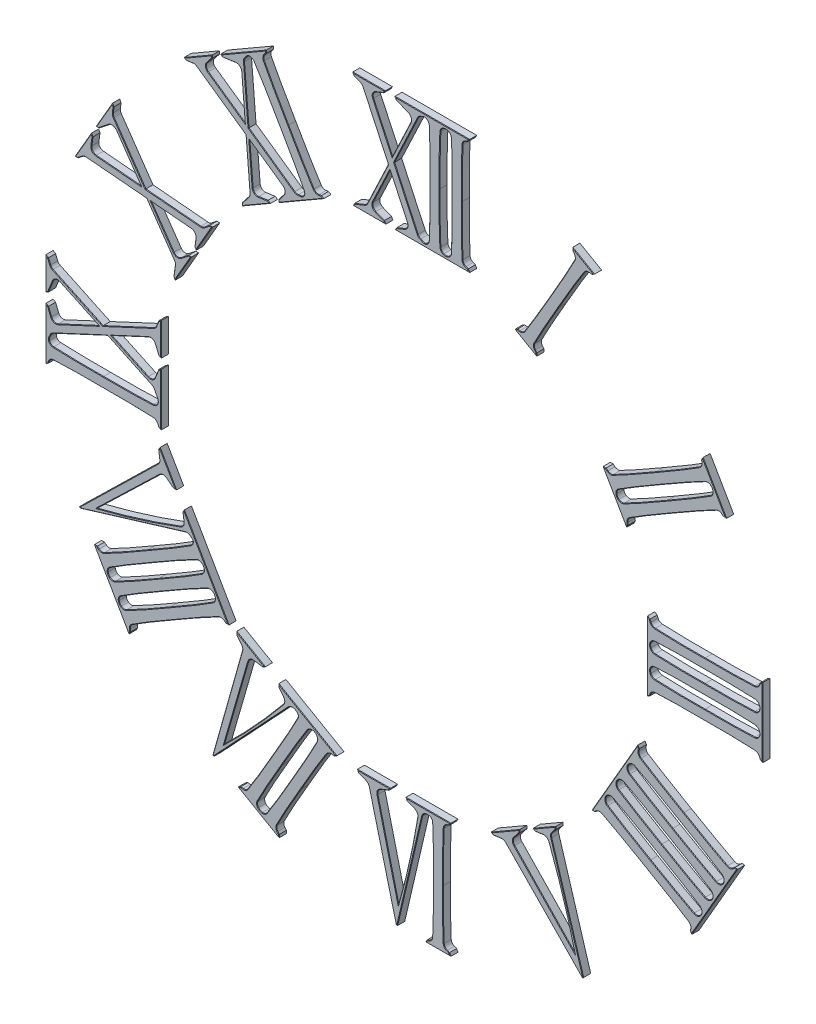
SolidWorks part; units mm, degrees
ref_plane "Спереди" through (0, 0, 0) normal (0, 0, 1) x (1, 0, 0)
ref_plane "Сверху" through (0, 0, 0) normal (0, 1, 0) x (1, 0, 0)
ref_plane "Справа" through (0, 0, 0) normal (1, 0, 0) x (0, 0, -1)
sketch "Эскиз2" plane through (0, 0, 0) normal (0, 0, 1) x (1, 0, 0)
  line L0 (0, 0) -> (30, 51.9615) construction
  line L1 (0, 0) -> (0, 77) construction
  line L2 (36.3522, 20.2743) -> (51.3986, 27.9408) construction
  line L3 (0, 0) -> (51.9615, -30) construction
  line L6 (33.5849, 63.1708) -> (33.5849, 62.5935)
  line L17 (37.4151, 60.3821) -> (36.9495, 60.4476)
  line L18 (24.25, 42.0022) -> (35.75, 61.9208) construction
  line L19 (33.5849, 63.1708) -> (37.9151, 60.6708)
  line L20 (22.0849, 43.2522) -> (22.5849, 43.5409)
  line L21 (33.5849, 62.5935) -> (33.8744, 62.223)
  line L22 (22.5849, 43.5409) -> (23.0505, 43.4755)
  line L23 (26.4151, 40.7522) -> (26.4151, 41.3296)
  line L24 (26.4151, 41.3296) -> (26.1256, 41.7001)
  line L25 (37.9151, 60.6708) -> (37.4151, 60.3821)
  line L26 (29.134, 52.4615) -> (30, 51.9615) construction
  line L27 (22.0849, 43.2522) -> (26.4151, 40.7522)
  line L28 (29, 49.5046) -> (29, 54.6308) construction
  line L29 (30.2438, 54.3838) -> (27.6807, 49.9445) construction
  line L30 (19.4297, 36.8398) -> (28.627, 51.0024) construction
  line L31 (40.8966, 26.1651) -> (60.8152, 37.6651) construction
  line L32 (62.0652, 35.5) -> (61.4878, 35.5) construction
  line L33 (39.6466, 28.3301) -> (42.1466, 24) construction
  line L34 (61.4878, 35.5) -> (61.1173, 35.7895) construction
  line L35 (59.5652, 39.8301) -> (59.2765, 39.3301)
  line L36 (40.2239, 28.3301) -> (40.5944, 28.0407)
  line L37 (42.1466, 24) -> (42.4352, 24.5) construction
  line L38 (39.6466, 28.3301) -> (40.2239, 28.3301)
  line L39 (59.2765, 39.3301) -> (59.3419, 38.8645)
  line L40 (42.4352, 24.5) -> (42.3698, 24.9656) construction
  line L41 (59.5652, 39.8301) -> (62.0652, 35.5) construction
  line L42 (50.3559, 32.7811) -> (50.8559, 31.9151) construction
  line L43 (28.134, 104.2991) -> (28.134, 109.4252) construction
  line L44 (41.8579, 24.5) -> (44.3579, 20.1699) construction
  line L45 (44.3579, 20.1699) -> (44.6466, 20.6699)
  line L46 (43.1079, 22.3349) -> (63.0265, 33.8349) construction
  line L47 (61.7765, 36) -> (64.2765, 31.6699) construction
  line L48 (61.7765, 36) -> (61.4878, 35.5) construction
  line L49 (63.6991, 31.6699) -> (63.3286, 31.9593)
  line L50 (42.4352, 24.5) -> (42.8057, 24.2105) construction
  line L51 (44.6466, 20.6699) -> (44.5811, 21.1355)
  line L52 (64.2765, 31.6699) -> (63.6991, 31.6699)
  line L53 (52.5672, 28.951) -> (53.0672, 28.0849) construction
  line L54 (41.8579, 24.5) -> (42.4352, 24.5) construction
  line L55 (61.4878, 35.5) -> (61.5532, 35.0344) construction
  line L56 (39.6466, 28.3301) -> (44.3579, 20.1699)
  line L57 (59.5652, 39.8301) -> (64.2765, 31.6699)
  line L58 (51.3559, 31.049) -> (52.5672, 28.951) construction
  line L59 (0, 0) -> (51.9615, 30) construction
  line L60 (51.4573, 28.3102) -> (55.8967, 30.8733) construction
  line L61 (49.246, 32.1403) -> (53.6854, 34.7034) construction
  line L62 (0, 0) -> (60, 0) construction
  line L63 (48.5, 2.5) -> (48.5, -2.5) construction
  line L64 (71.5, 2.5) -> (71.5, -2.5) construction
  line L65 (48.5, 0) -> (71.5, 0) construction
  line L66 (60, 1) -> (60, -1) construction
  line L67 (48.5, 2.5) -> (49, 2.2113) construction
  line L68 (49, 2.2113) -> (49.1761, 1.7754) construction
  line L69 (63.17, 1) -> (56.8288, 1) construction
  line L70 (59.7212, 0.6446) -> (34.8048, 1.9504) construction
  line L71 (71, 2.2113) -> (70.8239, 1.7754) construction
  line L72 (71.5, 2.5) -> (71, 2.2113) construction
  line L73 (71.5, -2.5) -> (71, -2.2113) construction
  line L74 (71, -2.2113) -> (70.8239, -1.7754) construction
  line L75 (59, -2.4569) -> (59, 2.6692) construction
  line L76 (49, -2.2113) -> (49.1761, -1.7754) construction
  line L77 (48.5, -2.5) -> (49, -2.2113) construction
  line L78 (34.1408, 24.1044) -> (49.1873, 31.7709) construction
  line L79 (49.1362, 29.7675) -> (53.5755, 32.3306) construction
  line L80 (71, 2.2113) -> (70.8239, 2.6473) construction
  line L81 (48.5, 4.4226) -> (71.5, 4.4226) construction
  line L82 (60, 5.4226) -> (60, 3.4226) construction
  line L83 (48.5, 6.9226) -> (48.5, 1.9226) construction
  line L84 (49, 2.2113) -> (49.1761, 2.6473) construction
  line L85 (71.5, 1.9226) -> (71, 2.2113) construction
  line L86 (48.5, 6.9226) -> (49, 6.634)
  line L87 (49, 6.634) -> (49.1761, 6.198)
  line L88 (71.5, 6.9226) -> (71, 6.634)
  line L89 (71.5, 6.9226) -> (71.5, 1.9226) construction
  line L90 (71, 6.634) -> (70.8239, 6.198)
  line L91 (48.5, 1.9226) -> (49, 2.2113) construction
  line L92 (62.5092, 3.9242) -> (37.5928, 2.6184) construction
  line L93 (62.5092, 4.9211) -> (37.5928, 6.2269) construction
  line L94 (62.1137, 5.4226) -> (57.8863, 5.4226) construction
  line L95 (62.1137, 3.4226) -> (57.8863, 3.4226) construction
  line L96 (71.5, -6.9226) -> (71, -6.634)
  line L97 (71, -6.634) -> (70.8239, -6.198)
  line L98 (49, -6.634) -> (49.1761, -6.198)
  line L99 (48.5, -6.9226) -> (49, -6.634)
  line L100 (71.5, 6.9226) -> (71.5, -6.9226)
  line L101 (48.5, 6.9226) -> (48.5, -6.9226)
  line L102 (48.5, -4.4226) -> (71.5, -4.4226) construction
  line L103 (57.4908, -3.9242) -> (82.4072, -2.6184) construction
  line L104 (62.5092, -3.9242) -> (37.5928, -2.6184) construction
  line L105 (62.1137, -3.4226) -> (57.8863, -3.4226) construction
  line L106 (44.3579, -20.1699) -> (44.6466, -20.6699) construction
  line L107 (44.6466, -20.6699) -> (44.5811, -21.1355) construction
  line L108 (42.4352, -24.5) -> (42.8057, -24.2105) construction
  line L109 (42.4352, -24.5) -> (42.3698, -24.9656) construction
  line L110 (42.1466, -24) -> (42.4352, -24.5) construction
  line L111 (41.8579, -24.5) -> (42.4352, -24.5) construction
  line L112 (37.4352, -32.1603) -> (46.5692, -16.3397)
  line L113 (39.6466, -28.3301) -> (40.2239, -28.3301) construction
  line L114 (40.2239, -28.3301) -> (40.5944, -28.0407) construction
  line L115 (0, 0) -> (51.9615, -30) construction
  line L116 (52.5672, -28.951) -> (53.0672, -28.0849) construction
  line L117 (51.3559, -31.049) -> (52.5672, -28.951) construction
  line L118 (50.3559, -32.7811) -> (50.8559, -31.9151) construction
  line L119 (64.2765, -31.6699) -> (63.6991, -31.6699) construction
  line L120 (63.6991, -31.6699) -> (63.3286, -31.9593) construction
  line L121 (43.1079, -22.3349) -> (63.0265, -33.8349) construction
  line L122 (62.0652, -35.5) -> (61.4878, -35.5) construction
  line L123 (61.4878, -35.5) -> (61.5532, -35.0344) construction
  line L124 (61.7765, -36) -> (61.4878, -35.5) construction
  line L125 (61.4878, -35.5) -> (61.1173, -35.7895) construction
  line L126 (40.8966, -26.1651) -> (60.8152, -37.6651) construction
  line L127 (57.3538, -43.6603) -> (66.4878, -27.8397)
  line L128 (59.2765, -39.3301) -> (59.3419, -38.8645) construction
  line L129 (59.5652, -39.8301) -> (59.2765, -39.3301) construction
  line L130 (46.5692, -16.3397) -> (46.8579, -16.8397)
  line L131 (46.8579, -16.8397) -> (46.7925, -17.3053)
  line L132 (66.4878, -27.8397) -> (65.9105, -27.8397)
  line L133 (65.9105, -27.8397) -> (65.54, -28.1292)
  line L134 (57.3538, -43.6603) -> (57.0652, -43.1603)
  line L135 (57.0652, -43.1603) -> (57.1306, -42.6947)
  line L136 (37.4352, -32.1603) -> (38.0126, -32.1603)
  line L137 (38.0126, -32.1603) -> (38.3831, -31.8708)
  line L138 (0, 0) -> (0, -71.5) construction
  line L139 (0, 0) -> (35.75, -61.9208) construction
  circle A0 centre (0, 0) radius 44
  circle A1 centre (0, 0) radius 77
  circle A2 centre (0, 0) radius 48.5 construction
  circle A3 centre (0, 0) radius 71.5 construction
  circle A8 centre (0, 0) radius 60 construction
  arc A9 (23.0505, 43.4755) -> (24.0284, 43.9211) centre (23.1897, 44.4657) ccw
  arc A10 (26.1256, 41.7001) -> (26.0226, 42.7697) centre (26.9136, 42.3157) cw
  arc A11 (33.8744, 62.223) -> (33.9774, 61.1533) centre (33.0864, 61.6073) cw
  arc A12 (36.9495, 60.4476) -> (35.9716, 60.0019) centre (36.8103, 59.4573) ccw
  arc A13 (61.1173, 35.7895) -> (60.0477, 35.8925) centre (60.5016, 35.0015) ccw
  arc A14 (40.5944, 28.0407) -> (41.6641, 27.9377) centre (41.2101, 28.8287) ccw
  arc A15 (59.3419, 38.8645) -> (58.8963, 37.8867) centre (58.3516, 38.7254) cw
  arc A16 (42.3698, 24.9656) -> (42.8154, 25.9434) centre (43.3601, 25.1048) cw
  arc A17 (44.5811, 21.1355) -> (45.0268, 22.1133) centre (45.5714, 21.2746) cw
  arc A18 (61.5532, 35.0344) -> (61.1076, 34.0566) centre (60.563, 34.8952) cw
  arc A19 (42.8057, 24.2105) -> (43.8754, 24.1075) centre (43.4214, 24.9985) ccw
  arc A20 (63.3286, 31.9593) -> (62.259, 32.0623) centre (62.713, 31.1713) ccw
  arc A21 (49.1761, 1.7754) -> (50.051, 1.1514) centre (50.1033, 2.15) ccw
  arc A22 (70.8239, 1.7754) -> (69.949, 1.1514) centre (69.8967, 2.15) cw
  arc A23 (70.8239, -1.7754) -> (69.949, -1.1514) centre (69.8967, -2.15) ccw
  arc A24 (49.1761, -1.7754) -> (50.051, -1.1514) centre (50.1033, -2.15) cw
  arc A25 (70.8239, 6.198) -> (69.949, 5.574) centre (69.8967, 6.5726) cw
  arc A26 (49.1761, 2.6473) -> (50.051, 3.2713) centre (50.1033, 2.2726) cw
  arc A27 (70.8239, 2.6473) -> (69.949, 3.2713) centre (69.8967, 2.2726) ccw
  arc A28 (49.1761, 6.198) -> (50.051, 5.574) centre (50.1033, 6.5726) ccw
  arc A29 (70.8239, -2.6473) -> (69.949, -3.2713) centre (69.8967, -2.2726) cw
  arc A30 (49.1761, -2.6473) -> (50.051, -3.2713) centre (50.1033, -2.2726) ccw
  arc A31 (70.8239, -6.198) -> (69.949, -5.574) centre (69.8967, -6.5726) ccw
  arc A32 (49.1761, -6.198) -> (50.051, -5.574) centre (50.1033, -6.5726) cw
  arc A33 (44.5811, -21.1355) -> (45.0268, -22.1133) centre (45.5714, -21.2746) ccw
  arc A34 (42.8057, -24.2105) -> (43.8754, -24.1075) centre (43.4214, -24.9985) cw
  arc A35 (42.3698, -24.9656) -> (42.8154, -25.9434) centre (43.3601, -25.1048) ccw
  arc A36 (40.5944, -28.0407) -> (41.6641, -27.9377) centre (41.2101, -28.8287) cw
  arc A37 (63.3286, -31.9593) -> (62.259, -32.0623) centre (62.713, -31.1713) cw
  arc A38 (61.5532, -35.0344) -> (61.1076, -34.0566) centre (60.563, -34.8952) ccw
  arc A39 (61.1173, -35.7895) -> (60.0477, -35.8925) centre (60.5016, -35.0015) cw
  arc A40 (59.3419, -38.8645) -> (58.8963, -37.8867) centre (58.3516, -38.7254) ccw
  arc A41 (46.7925, -17.3053) -> (47.2381, -18.2832) centre (47.7827, -17.4445) ccw
  arc A42 (65.54, -28.1292) -> (64.4703, -28.2322) centre (64.9243, -27.3412) cw
  arc A43 (63.7646, -31.2043) -> (63.3189, -30.2264) centre (62.7743, -31.0651) ccw
  arc A44 (45.0171, -20.3804) -> (46.0867, -20.2774) centre (45.6327, -21.1684) cw
  arc A45 (58.906, -39.6196) -> (57.8363, -39.7226) centre (58.2903, -38.8316) cw
  arc A46 (57.1306, -42.6947) -> (56.685, -41.7168) centre (56.1403, -42.5555) ccw
  arc A47 (38.3831, -31.8708) -> (39.4527, -31.7678) centre (38.9988, -32.6588) cw
  arc A48 (40.1585, -28.7957) -> (40.6041, -29.7736) centre (41.1488, -28.9349) ccw
  spline S0 degree 3 poles (42.3698, -24.9656) (42.4103, -24.6778) (42.5455, -24.4139) (42.8057, -24.2105) knots 0 0 0 0 1 1 1 1
  spline S1 degree 3 poles (53.5672, -27.2189) (50.7926, -25.617) (47.3872, -23.6462) (45.0268, -22.1133) knots 0 0 0 0 1 1 1 1
  spline S2 degree 3 poles (50.3559, -32.7811) (47.5813, -31.1792) (44.1718, -29.2154) (41.6641, -27.9377) knots 0 0 0 0 1 1 1 1
  spline S3 degree 3 poles (51.3559, -31.049) (48.5813, -29.4471) (45.1759, -27.4763) (42.8154, -25.9434) knots 0 0 0 0 1 1 1 1
  spline S4 degree 3 poles (30.866, 51.4615) (32.4679, 54.2361) (34.4387, 57.6415) (35.9716, 60.0019) knots 0 0 0 0 1 1 1 1
  spline S5 degree 3 poles (30.866, 51.4615) (29.2641, 48.6869) (27.3004, 45.2775) (26.0226, 42.7697) knots 0 0 0 0 1 1 1 1
  spline S6 degree 3 poles (29.134, 52.4615) (27.5321, 49.6869) (25.5613, 46.2815) (24.0284, 43.9211) knots 0 0 0 0 1 1 1 1
  spline S7 degree 3 poles (29.134, 52.4615) (30.7359, 55.2361) (32.6996, 58.6456) (33.9774, 61.1533) knots 0 0 0 0 1 1 1 1
  spline S8 degree 3 poles (50.3559, 32.7811) (47.5813, 31.1792) (44.1718, 29.2154) (41.6641, 27.9377) knots 0 0 0 0 1 1 1 1
  spline S9 degree 3 poles (51.3559, 31.049) (48.5813, 29.4471) (45.1759, 27.4763) (42.8154, 25.9434) knots 0 0 0 0 1 1 1 1
  spline S10 degree 3 poles (51.3559, 31.049) (54.1305, 32.651) (57.5399, 34.6147) (60.0477, 35.8925) knots 0 0 0 0 1 1 1 1
  spline S11 degree 3 poles (50.3559, 32.7811) (53.1305, 34.383) (56.5358, 36.3538) (58.8963, 37.8867) knots 0 0 0 0 1 1 1 1
  spline S12 degree 3 poles (52.5672, 28.951) (55.3418, 30.5529) (58.7472, 32.5237) (61.1076, 34.0566) knots 0 0 0 0 1 1 1 1
  spline S13 degree 3 poles (53.5672, 27.2189) (50.7926, 25.617) (47.3872, 23.6462) (45.0268, 22.1133) knots 0 0 0 0 1 1 1 1
  spline S14 degree 3 poles (52.5672, 28.951) (49.7926, 27.349) (46.3831, 25.3853) (43.8754, 24.1075) knots 0 0 0 0 1 1 1 1
  spline S15 degree 3 poles (53.5672, 27.2189) (56.3418, 28.8208) (59.7512, 30.7846) (62.259, 32.0623) knots 0 0 0 0 1 1 1 1
  spline S16 degree 3 poles (42.3698, 24.9656) (42.4103, 24.6778) (42.5455, 24.4139) (42.8057, 24.2105) knots 0 0 0 0 1 1 1 1
  spline S17 degree 3 poles (61.1173, 35.7895) (61.3463, 35.6105) (61.5073, 35.3614) (61.5532, 35.0344) knots 0 0 0 0 1 1 1 1
  spline S18 degree 3 poles (50.051, 1.1514) (54.2037, 0.9337) (57.3578, 1) (60, 1) knots 0 0 0 0 1 1 1 1
  spline S19 degree 3 poles (69.949, 1.1514) (65.7963, 0.9337) (62.6422, 1) (60, 1) knots 0 0 0 0 1 1 1 1
  spline S20 degree 3 poles (69.949, -1.1514) (65.7963, -0.9337) (62.6422, -1) (60, -1) knots 0 0 0 0 1 1 1 1
  spline S21 degree 3 poles (50.051, -1.1514) (54.2037, -0.9337) (57.3578, -1) (60, -1) knots 0 0 0 0 1 1 1 1
  spline S22 degree 3 poles (50.051, 5.574) (54.2037, 5.3564) (57.3578, 5.4226) (60, 5.4226) knots 0 0 0 0 1 1 1 1
  spline S23 degree 3 poles (50.051, 3.2713) (54.2037, 3.4889) (57.3578, 3.4226) (60, 3.4226) knots 0 0 0 0 1 1 1 1
  spline S24 degree 3 poles (69.949, 3.2713) (65.7963, 3.4889) (62.6422, 3.4226) (60, 3.4226) knots 0 0 0 0 1 1 1 1
  spline S25 degree 3 poles (69.949, 5.574) (65.7963, 5.3564) (62.6422, 5.4226) (60, 5.4226) knots 0 0 0 0 1 1 1 1
  spline S26 degree 3 poles (49.1761, 1.7754) (49.0673, 2.0449) (49.0524, 2.3411) (49.1761, 2.6473) knots 0 0 0 0 1 1 1 1
  spline S27 degree 3 poles (70.8239, 1.7754) (70.9327, 2.0449) (70.9476, 2.3411) (70.8239, 2.6473) knots 0 0 0 0 1 1 1 1
  spline S28 degree 3 poles (70.8239, -1.7754) (70.9327, -2.0449) (70.9476, -2.3411) (70.8239, -2.6473) knots 0 0 0 0 1 1 1 1
  spline S29 degree 3 poles (69.949, -3.2713) (65.7963, -3.4889) (62.6422, -3.4226) (60, -3.4226) knots 0 0 0 0 1 1 1 1
  spline S30 degree 3 poles (50.051, -3.2713) (54.2037, -3.4889) (57.3578, -3.4226) (60, -3.4226) knots 0 0 0 0 1 1 1 1
  spline S31 degree 3 poles (49.1761, -1.7754) (49.0673, -2.0449) (49.0524, -2.3411) (49.1761, -2.6473) knots 0 0 0 0 1 1 1 1
  spline S32 degree 3 poles (69.949, -5.574) (65.7963, -5.3564) (62.6422, -5.4226) (60, -5.4226) knots 0 0 0 0 1 1 1 1
  spline S33 degree 3 poles (50.051, -5.574) (54.2037, -5.3564) (57.3578, -5.4226) (60, -5.4226) knots 0 0 0 0 1 1 1 1
  spline S34 degree 3 poles (52.5672, -28.951) (49.7926, -27.349) (46.3831, -25.3853) (43.8754, -24.1075) knots 0 0 0 0 1 1 1 1
  spline S35 degree 3 poles (53.5672, -27.2189) (56.3418, -28.8208) (59.7512, -30.7846) (62.259, -32.0623) knots 0 0 0 0 1 1 1 1
  spline S36 degree 3 poles (52.5672, -28.951) (55.3418, -30.5529) (58.7472, -32.5237) (61.1076, -34.0566) knots 0 0 0 0 1 1 1 1
  spline S37 degree 3 poles (61.1173, -35.7895) (61.3463, -35.6105) (61.5073, -35.3614) (61.5532, -35.0344) knots 0 0 0 0 1 1 1 1
  spline S38 degree 3 poles (51.3559, -31.049) (54.1305, -32.651) (57.5399, -34.6147) (60.0477, -35.8925) knots 0 0 0 0 1 1 1 1
  spline S39 degree 3 poles (50.3559, -32.7811) (53.1305, -34.383) (56.5358, -36.3538) (58.8963, -37.8867) knots 0 0 0 0 1 1 1 1
  spline S40 degree 3 poles (55.7785, -23.3888) (53.0039, -21.7869) (49.5985, -19.8161) (47.2381, -18.2832) knots 0 0 0 0 1 1 1 1
  spline S41 degree 3 poles (55.7785, -23.3888) (58.5531, -24.9907) (61.9626, -26.9544) (64.4703, -28.2322) knots 0 0 0 0 1 1 1 1
  spline S42 degree 3 poles (63.7646, -31.2043) (63.7241, -31.4921) (63.5889, -31.756) (63.3286, -31.9593) knots 0 0 0 0 1 1 1 1
  spline S43 degree 3 poles (45.0171, -20.3804) (44.7881, -20.5593) (44.6271, -20.8084) (44.5811, -21.1355) knots 0 0 0 0 1 1 1 1
  spline S44 degree 3 poles (54.7785, -25.1208) (57.5531, -26.7228) (60.9585, -28.6935) (63.3189, -30.2264) knots 0 0 0 0 1 1 1 1
  spline S45 degree 3 poles (54.7785, -25.1208) (52.0039, -23.5189) (48.5945, -21.5552) (46.0867, -20.2774) knots 0 0 0 0 1 1 1 1
  spline S46 degree 3 poles (59.3419, -38.8645) (59.3015, -39.1523) (59.1662, -39.4163) (58.906, -39.6196) knots 0 0 0 0 1 1 1 1
  spline S47 degree 3 poles (40.5944, -28.0407) (40.3654, -28.2196) (40.2044, -28.4687) (40.1585, -28.7957) knots 0 0 0 0 1 1 1 1
  spline S48 degree 3 poles (48.1445, -36.6112) (50.9191, -38.2131) (54.3245, -40.1839) (56.685, -41.7168) knots 0 0 0 0 1 1 1 1
  spline S49 degree 3 poles (49.1445, -34.8792) (51.9191, -36.4811) (55.3286, -38.4448) (57.8363, -39.7226) knots 0 0 0 0 1 1 1 1
  spline S50 degree 3 poles (49.1445, -34.8792) (46.3699, -33.2772) (42.9646, -31.3065) (40.6041, -29.7736) knots 0 0 0 0 1 1 1 1
  spline S51 degree 3 poles (48.1445, -36.6112) (45.3699, -35.0093) (41.9605, -33.0456) (39.4527, -31.7678) knots 0 0 0 0 1 1 1 1
  point P100 (51.9615, 30)
  dimension "D1" = 88
  dimension "D2" = 154
  dimension "D12" = 97
  dimension "D13" = 143
  dimension "D14" = 120
  dimension "D20" = 1
  dimension "D21" = 3
  dimension "D29" = 2
  dimension "D37" = 2
  dimension "D40" = 23
  dimension "D41" = 2
  dimension "D48" = 3
  dimension "D43" = 2
  dimension "D49" = 3
  dimension "D50" = 2
  dimension "D51" = 2
  dimension "D55" = 3
  dimension "D56" = 3
  dimension "D58" = 3
  dimension "D59" = 3
  dimension "D6" = 3
  dimension "D3" = 30
  dimension "D7" = 30
  dimension "D16" = 5
  dimension "D17" = 60
  dimension "D18" = 22
  dimension "D19" = 0.5
  dimension "D22" = 1
  dimension "D23" = 2.15
  dimension "D24" = 30
  dimension "D25" = 2.5
  dimension "D26" = 60
  dimension "D27" = 22
  dimension "D28" = 0.5
  dimension "D30" = 2.15
  dimension "D31" = 1
  dimension "D32" = 23
  dimension "D33" = 2.5
  dimension "D34" = 60
  dimension "D35" = 22
  dimension "D36" = 0.5
  dimension "D38" = 2.15
  dimension "D39" = 1
  dimension "D42" = 5
  dimension "D44" = 60
  dimension "D45" = 22
  dimension "D46" = 0.5
  dimension "D47" = 2.15
  dimension "D52" = 60
  dimension "D53" = 22
  dimension "D54" = 0.5
  dimension "D57" = 4.4226
extrude "Бобышка-Вытянуть1" add sketch "Эскиз2" along normal blind 1.5
sketch "Эскиз3" plane through (0, 0, 1.5) normal (0, 0, 1) x (1, 0, 0)
  line L0 (0, 0) -> (0, -71.5) construction
  line L1 (0, 0) -> (35.75, -61.9208) construction
  line L2 (35.75, -61.9208) -> (35.5732, -62.0976)
  line L3 (20.2308, -46.3756) -> (35.5732, -62.0976)
  line L4 (35.75, -61.9208) -> (29.3692, -40.9192)
  line L5 (34.0343, -58.5022) -> (21.991, -45.9873)
  line L6 (35.75, -61.9208) -> (34.0343, -58.5022) construction
  line L7 (17.296, -46.0171) -> (30.2301, -38.5496) construction
  line L8 (17.296, -46.0171) -> (22.9988, -42.7246)
  line L9 (17.296, -46.0171) -> (17.796, -46.3058)
  line L10 (4.2733, -71.5) -> (4.5619, -71)
  line L11 (22.9988, -42.7246) -> (22.9988, -43.302)
  line L12 (22.9988, -43.302) -> (21.9235, -44.6782)
  line L13 (17.796, -46.3058) -> (19.3759, -46.0837)
  line L14 (25.6835, -41.1746) -> (30.2301, -38.5496)
  line L15 (25.6835, -41.1746) -> (26.1835, -41.4633)
  line L16 (26.1835, -41.4633) -> (27.7579, -41.242)
  line L17 (30.2301, -38.5496) -> (30.2301, -39.127)
  line L18 (30.2301, -39.127) -> (29.538, -40.0128)
  line L19 (-1.35, -71.4873) -> (3.6213, -50.1244)
  line L20 (-1.35, -71.4873) -> (-1.5915, -71.552)
  line L21 (-1.5915, -71.552) -> (-7.0142, -50.2778)
  line L22 (-1.35, -71.4873) -> (-1.35, -48.4812) construction
  line L23 (-1.35, -71.4873) -> (-1.1265, -67.6688) construction
  line L24 (-1.1265, -67.6688) -> (-5.2957, -50.8217)
  line L25 (4.5619, -71) -> (4.9979, -70.8239)
  line L26 (-9.3765, -48.5) -> (5.5585, -48.5) construction
  line L27 (-2.7915, -48.5) -> (-9.3765, -48.5)
  line L28 (-9.3765, -48.5) -> (-9.0878, -49)
  line L29 (-9.0878, -49) -> (-7.6086, -49.5976)
  line L30 (-2.7915, -48.5) -> (-3.0802, -49)
  line L31 (-3.0802, -49) -> (-4.6996, -49.6543)
  line L32 (0.3085, -48.5) -> (5.5585, -48.5)
  line L33 (0.3085, -48.5) -> (0.5972, -49)
  line L34 (0.5972, -49) -> (2.0663, -49.5936)
  line L35 (5.5585, -48.5) -> (5.2698, -49) construction
  line L36 (5.2698, -49) -> (4.2207, -49.4239) construction
  line L37 (6.7732, -48.5) -> (6.7733, -71.5) construction
  line L38 (5.5585, -48.5) -> (9.2733, -48.5)
  line L39 (4.5619, -49) -> (4.9979, -49.1761) construction
  line L40 (8.9846, -49) -> (8.5486, -49.1761)
  line L41 (4.2733, -71.5) -> (9.2733, -71.5)
  line L42 (6.7733, -60) -> (7.7733, -60) construction
  line L43 (9.2733, -71.5) -> (8.9846, -71)
  line L44 (8.9846, -71) -> (8.5486, -70.8239)
  line L45 (7.4039, -60.0137) -> (8.4706, -80.3666) construction
  line L46 (7.7733, -49.7982) -> (7.7733, -70.2018) construction
  line L47 (9.2733, -48.5) -> (8.9846, -49)
  line L48 (4.2733, -48.5) -> (4.5619, -49) construction
  line L49 (0, 0) -> (-35.75, -61.9208) construction
  line L50 (-33.448, -36.6918) -> (-13.4743, -48.2236) construction
  line L51 (-19.4695, -44.7622) -> (-30.9695, -64.6808) construction
  line L52 (-21.6346, -43.5122) -> (-17.3045, -46.0122) construction
  line L53 (-33.1346, -63.4308) -> (-28.8045, -65.9308) construction
  line L54 (-25.2195, -54.7215) -> (-26.0856, -54.2215) construction
  line L55 (-36.5902, -71.0757) -> (-25.7767, -54.4243) construction
  line L56 (-33.1346, -63.4308) -> (-32.6346, -63.1421)
  line L57 (-32.6346, -63.1421) -> (-32.169, -63.2076)
  line L58 (-26.0856, -54.2215) -> (-37.2842, -71.4658) construction
  line L59 (-31.0597, -62.837) -> (-21.0729, -45.5394) construction
  line L60 (-21.6346, -44.0896) -> (-21.3451, -44.4601) construction
  line L61 (-21.6346, -43.5122) -> (-21.6346, -44.0896) construction
  line L62 (-28.8045, -65.9308) -> (-28.8045, -65.3535) construction
  line L63 (-28.8045, -65.3535) -> (-29.0939, -64.983) construction
  line L64 (-17.8045, -46.3009) -> (-18.2701, -46.2355) construction
  line L65 (-17.3045, -46.0122) -> (-17.8045, -46.3009) construction
  line L66 (-17.8045, -45.7236) -> (-13.4743, -48.2236) construction
  line L67 (-13.4743, -48.2236) -> (-13.9743, -48.5122)
  line L68 (-28.8045, -65.3535) -> (-28.3389, -65.4189) construction
  line L69 (-17.8045, -45.7236) -> (-17.8045, -46.3009) construction
  line L70 (-29.3045, -65.6421) -> (-24.9743, -68.1421) construction
  line L71 (-24.9743, -68.1421) -> (-24.9743, -67.5648)
  line L72 (-17.8045, -46.3009) -> (-17.515, -46.6714) construction
  line L73 (-13.9743, -48.5122) -> (-14.4399, -48.4468)
  line L74 (-29.3045, -65.6421) -> (-28.8045, -65.3535) construction
  line L75 (-24.9743, -67.5648) -> (-25.2638, -67.1943)
  line L76 (-27.1394, -66.8921) -> (-15.6394, -46.9736) construction
  line L77 (-32.7678, -73.299) -> (-21.9543, -56.6476) construction
  line L78 (-29.8262, -74.8767) -> (-20.8125, -57.1863) construction
  line L79 (-23.587, -58.7392) -> (-20.9239, -54.1265) construction
  line L80 (-21.3894, -56.9328) -> (-22.2554, -56.4328) construction
  line L81 (-21.3894, -56.9328) -> (-20.5234, -57.4328) construction
  line L82 (-21.855, -59.7392) -> (-19.1918, -55.1265) construction
  line L83 (-10.011, -40.5667) -> (-20.8245, -57.2181) construction
  line L84 (-12.9051, -38.8958) -> (-21.9189, -56.5863) construction
  line L85 (-23.587, -58.7392) -> (-20.9239, -54.1265) construction
  line L86 (-19.1918, -55.1265) -> (-21.855, -59.7392) construction
  line L87 (-21.6346, -43.5122) -> (-13.4743, -48.2236)
  line L88 (-33.1346, -63.4308) -> (-24.9743, -68.1421)
  line L89 (-26.5045, -40.7006) -> (-37.9808, -60.5781) construction
  line L90 (-37.9808, -60.5781) -> (-38.2223, -60.5134)
  line L91 (-38.2223, -60.5134) -> (-32.2911, -39.4126)
  line L92 (-37.9808, -60.5781) -> (-23.0237, -44.5947)
  line L93 (-37.9808, -60.5781) -> (-35.878, -57.383) construction
  line L94 (-35.878, -57.383) -> (-31.075, -40.7428)
  line L95 (-33.448, -36.6918) -> (-27.7452, -39.9843)
  line L96 (-33.448, -36.6918) -> (-33.448, -37.2691)
  line L97 (-33.448, -37.2691) -> (-32.4658, -38.5263)
  line L98 (-27.7452, -39.9843) -> (-28.2452, -40.2729)
  line L99 (-28.2452, -40.2729) -> (-29.9751, -40.0298)
  line L100 (-25.0605, -41.5343) -> (-20.5139, -44.1593) construction
  line L101 (-25.0605, -41.5343) -> (-25.0605, -42.1116)
  line L102 (-25.0605, -42.1116) -> (-24.0941, -43.3486)
  line L103 (-20.5139, -44.1593) -> (-21.0139, -44.4479) construction
  line L104 (-21.0139, -44.4479) -> (-22.1544, -44.2877) construction
  line L105 (-25.0605, -41.5343) -> (-21.6346, -43.5122)
  line L106 (0, 0) -> (-61.9208, -35.75) construction
  line L107 (-48.9844, -12.1565) -> (-34.9909, -36.394) construction
  line L108 (-46.7365, -39.5771) -> (-29.583, -28.4375) construction
  line L109 (-46.1204, -40.6443) -> (-27.8964, -31.3587) construction
  line L110 (-38.4522, -30.3988) -> (-58.3708, -41.8988) construction
  line L111 (-59.6208, -39.7337) -> (-57.1208, -44.0638) construction
  line L112 (-48.4115, -36.1488) -> (-48.9115, -35.2828) construction
  line L113 (-59.6208, -39.7337) -> (-59.0435, -39.7337) construction
  line L114 (-59.0435, -39.7337) -> (-58.673, -40.0232) construction
  line L115 (-46.2421, -34.3374) -> (-64.466, -43.6229) construction
  line L116 (-40.4865, -30.4186) -> (-57.2671, -40.1068) construction
  line L117 (-48.4914, -35.4834) -> (-66.7153, -44.769) construction
  line L118 (-39.7022, -28.2337) -> (-39.9909, -28.7337) construction
  line L119 (-39.9909, -28.7337) -> (-39.9255, -29.1993) construction
  line L120 (-57.1208, -44.0638) -> (-56.8321, -43.5638) construction
  line L121 (-56.8321, -43.5638) -> (-56.8976, -43.0983) construction
  line L122 (-37.2022, -32.5638) -> (-37.7796, -32.5638) construction
  line L123 (-37.7796, -32.5638) -> (-38.1501, -32.2744) construction
  line L124 (-36.2409, -34.2289) -> (-56.1595, -45.7289) construction
  line L125 (-54.6208, -47.394) -> (-54.6863, -46.9284)
  line L126 (-57.4095, -43.5638) -> (-56.8321, -43.5638) construction
  line L127 (-35.5683, -36.394) -> (-35.9388, -36.1045)
  line L128 (-56.8321, -43.5638) -> (-56.4616, -43.8533) construction
  line L129 (-37.7796, -32.5638) -> (-37.7141, -33.0294) construction
  line L130 (-57.4095, -43.5638) -> (-54.9095, -47.894) construction
  line L131 (-37.4909, -32.0638) -> (-37.7796, -32.5638) construction
  line L132 (-54.9095, -47.894) -> (-54.6208, -47.394)
  line L133 (-34.9909, -36.394) -> (-35.5683, -36.394)
  line L134 (-48.9376, -40.4047) -> (-44.4628, -37.8211) construction
  line L135 (-46.2002, -39.9789) -> (-46.7002, -39.1129) construction
  line L136 (-43.4628, -39.5532) -> (-47.9376, -42.1367) construction
  line L137 (-46.28, -39.3135) -> (-64.504, -48.5991) construction
  line L138 (-45.6639, -40.3807) -> (-62.8174, -51.5203) construction
  line L139 (-46.2002, -39.9789) -> (-45.7002, -40.8449) construction
  line L140 (-43.4628, -39.5532) -> (-47.9376, -42.1367) construction
  line L141 (-48.9376, -40.4047) -> (-44.4628, -37.8211) construction
  line L142 (-41.9136, -24.4036) -> (-34.9909, -36.394)
  line L143 (-54.9095, -47.894) -> (-61.8321, -35.9036)
  line L144 (-41.9136, -24.4036) -> (-42.2022, -24.9036)
  line L145 (-59.3321, -40.2337) -> (-59.0435, -39.7337) construction
  line L146 (-61.2548, -35.9036) -> (-60.8843, -36.1931)
  line L147 (-61.8321, -35.9036) -> (-61.2548, -35.9036)
  line L148 (-39.4136, -28.7337) -> (-39.9909, -28.7337) construction
  line L149 (-39.9909, -28.7337) -> (-40.3614, -28.4443) construction
  line L150 (-59.0435, -39.7337) -> (-59.1089, -39.2681) construction
  line L151 (-42.2022, -24.9036) -> (-42.1368, -25.3692)
  line L152 (-40.6636, -26.5687) -> (-60.5821, -38.0687) construction
  line L153 (-50.6228, -32.3187) -> (-51.1228, -31.4526) construction
  line L154 (-50.6228, -32.3187) -> (-50.1228, -33.1847) construction
  circle A0 centre (0, 0) radius 48.5 construction
  circle A1 centre (0, 0) radius 60 construction
  circle A2 centre (0, 0) radius 71.5 construction
  arc A3 (20.2308, -46.3756) -> (19.3759, -46.0837) centre (19.5151, -47.074) ccw
  arc A4 (21.9235, -44.6782) -> (21.991, -45.9873) centre (22.7116, -45.2939) ccw
  arc A5 (34.0343, -58.5022) -> (28.8325, -41.8787) centre (-111.4799, -94.9112) ccw
  arc A6 (28.8325, -41.8787) -> (27.7579, -41.242) centre (27.8971, -42.2323) ccw
  arc A7 (29.538, -40.0128) -> (29.3692, -40.9192) centre (30.326, -40.6285) ccw
  arc A8 (-7.0142, -50.2778) -> (-7.6086, -49.5976) centre (-7.9832, -50.5248) ccw
  arc A9 (-4.6996, -49.6543) -> (-5.2957, -50.8217) centre (-4.325, -50.5815) ccw
  arc A10 (2.6785, -50.6823) -> (2.0663, -49.5936) centre (1.6917, -50.5207) ccw
  arc A11 (-1.1265, -67.6688) -> (2.6785, -50.6823) centre (-145.35, -26.4429) ccw
  arc A12 (4.2207, -49.4239) -> (3.6213, -50.1244) centre (4.5953, -50.3511) ccw
  arc A13 (7.9246, -69.949) -> (8.5486, -70.8239) centre (8.9233, -69.8967) ccw
  arc A14 (5.6219, -69.949) -> (4.9979, -70.8239) centre (4.6233, -69.8967) cw
  arc A15 (7.9246, -50.051) -> (8.5486, -49.1761) centre (8.9233, -50.1033) cw
  arc A16 (5.6219, -50.051) -> (4.9979, -49.1761) centre (4.6233, -50.1033) ccw construction
  arc A17 (-32.169, -63.2076) -> (-31.1912, -62.7619) centre (-32.0298, -62.2173) ccw
  arc A18 (-21.3451, -44.4601) -> (-21.2421, -45.5297) centre (-22.1332, -45.0757) cw construction
  arc A19 (-29.0939, -64.983) -> (-29.1969, -63.9133) centre (-28.3059, -64.3673) cw
  arc A20 (-18.2701, -46.2355) -> (-19.2479, -46.6811) centre (-18.4092, -47.2257) ccw
  arc A21 (-17.515, -46.6714) -> (-17.412, -47.7411) centre (-18.303, -47.2871) cw
  arc A22 (-25.2638, -67.1943) -> (-25.3668, -66.1246) centre (-24.4758, -66.5786) cw
  arc A23 (-14.4399, -48.4468) -> (-15.4178, -48.8924) centre (-14.5791, -49.4371) ccw
  arc A24 (-28.3389, -65.4189) -> (-27.361, -64.9733) centre (-28.1997, -64.4286) ccw
  arc A25 (-32.4658, -38.5263) -> (-32.2911, -39.4126) centre (-33.2538, -39.142) cw
  arc A26 (-29.9751, -40.0298) -> (-31.075, -40.7428) centre (-30.1142, -41.0201) ccw
  arc A27 (-22.1544, -44.2877) -> (-23.0237, -44.5947) centre (-22.2935, -45.2779) ccw
  arc A28 (-35.878, -57.383) -> (-24.1084, -44.5978) centre (-140.1662, 50.4315) ccw
  arc A29 (-58.673, -40.0232) -> (-57.6033, -40.1262) centre (-58.0573, -39.2352) ccw
  arc A30 (-24.0941, -43.3486) -> (-24.1084, -44.5978) centre (-24.8821, -43.9643) cw
  arc A31 (-39.9255, -29.1993) -> (-40.3711, -30.1772) centre (-40.9157, -29.3385) cw
  arc A32 (-56.8976, -43.0983) -> (-56.4519, -42.1204) centre (-55.9073, -42.9591) cw
  arc A33 (-38.1501, -32.2744) -> (-39.2197, -32.1714) centre (-38.7657, -33.0624) ccw
  arc A34 (-56.4616, -43.8533) -> (-55.392, -43.9563) centre (-55.846, -43.0653) ccw
  arc A35 (-37.7141, -33.0294) -> (-38.1598, -34.0073) centre (-38.7044, -33.1686) cw
  arc A36 (-35.9388, -36.1045) -> (-37.0084, -36.0015) centre (-36.5544, -36.8925) ccw
  arc A37 (-54.6863, -46.9284) -> (-54.2406, -45.9505) centre (-53.696, -46.7892) cw
  arc A38 (-40.3614, -28.4443) -> (-41.4311, -28.3413) centre (-40.9771, -29.2323) ccw
  arc A39 (-60.8843, -36.1931) -> (-59.8146, -36.296) centre (-60.2686, -35.405) ccw
  arc A40 (-59.1089, -39.2681) -> (-58.6633, -38.2903) centre (-58.1186, -39.129) cw
  arc A41 (-42.1368, -25.3692) -> (-42.5824, -26.347) centre (-43.1271, -25.5084) cw
  spline S0 degree 3 poles (7.9246, -69.949) (7.7468, -66.5569) (7.7733, -63.4006) (7.7733, -60) knots 0 0 0 0 1 1 1 1
  spline S1 degree 3 poles (5.6219, -69.949) (5.7997, -66.5569) (5.7732, -63.4006) (5.7732, -60) knots 0 0 0 0 1 1 1 1
  spline S2 degree 3 poles (5.6219, -50.051) (5.7997, -53.4431) (5.7732, -56.5994) (5.7732, -60) knots 0 0 0 0 1 1 1 1
  spline S3 degree 3 poles (7.9246, -50.051) (7.7468, -53.4431) (7.7733, -56.5994) (7.7733, -60) knots 0 0 0 0 1 1 1 1
  spline S4 degree 3 poles (4.2207, -49.4239) (4.6951, -49.2322) (5.5819, -49.2884) (5.6219, -50.051) knots 0 0 0 0 1 1 1 1
  spline S5 degree 3 poles (-26.0856, -54.2215) (-27.75, -57.1045) (-29.3889, -59.9867) (-31.1912, -62.7619) knots 0 0 0 0 1 1 1 1
  spline S6 degree 3 poles (-26.0856, -54.2215) (-24.4211, -51.3386) (-22.7444, -48.4781) (-21.2421, -45.5297) knots 0 0 0 0 1 1 1 1
  spline S7 degree 3 poles (-24.3535, -55.2215) (-26.018, -58.1045) (-27.6946, -60.9649) (-29.1969, -63.9133) knots 0 0 0 0 1 1 1 1
  spline S8 degree 3 poles (-24.3535, -55.2215) (-22.6891, -52.3386) (-21.0502, -49.4563) (-19.2479, -46.6811) knots 0 0 0 0 1 1 1 1
  spline S9 degree 3 poles (-20.5234, -57.4328) (-22.1878, -60.3158) (-23.8645, -63.1762) (-25.3668, -66.1246) knots 0 0 0 0 1 1 1 1
  spline S10 degree 3 poles (-22.2554, -56.4328) (-23.9199, -59.3158) (-25.5588, -62.198) (-27.361, -64.9733) knots 0 0 0 0 1 1 1 1
  spline S11 degree 3 poles (-20.5234, -57.4328) (-18.8589, -54.5499) (-17.22, -51.6677) (-15.4178, -48.8924) knots 0 0 0 0 1 1 1 1
  spline S12 degree 3 poles (-22.2554, -56.4328) (-20.591, -53.5499) (-18.9143, -50.6895) (-17.412, -47.7411) knots 0 0 0 0 1 1 1 1
  spline S13 degree 3 poles (-29.0939, -64.983) (-28.915, -65.212) (-28.6659, -65.3729) (-28.3389, -65.4189) knots 0 0 0 0 1 1 1 1
  spline S14 degree 3 poles (-18.2701, -46.2355) (-17.9823, -46.2759) (-17.7183, -46.4112) (-17.515, -46.6714) knots 0 0 0 0 1 1 1 1
  spline S15 degree 3 poles (-22.1544, -44.2877) (-21.6457, -44.3592) (-20.8957, -44.8498) (-21.2421, -45.5297) knots 0 0 0 0 1 1 1 1
  spline S16 degree 3 poles (-57.6033, -40.1262) (-54.566, -38.5786) (-51.7083, -36.8975) (-48.9115, -35.2828) knots 0 0 0 0 1 1 1 1
  spline S17 degree 3 poles (-40.3711, -30.1772) (-43.23, -32.0338) (-46.1148, -33.668) (-48.9115, -35.2828) knots 0 0 0 0 1 1 1 1
  spline S18 degree 3 poles (-39.2197, -32.1714) (-42.2571, -33.719) (-45.1148, -35.4001) (-47.9115, -37.0148) knots 0 0 0 0 1 1 1 1
  spline S19 degree 3 poles (-56.4519, -42.1204) (-53.593, -40.2638) (-50.7083, -38.6295) (-47.9115, -37.0148) knots 0 0 0 0 1 1 1 1
  spline S20 degree 3 poles (-54.2406, -45.9505) (-51.3817, -44.0939) (-48.497, -42.4596) (-45.7002, -40.8449) knots 0 0 0 0 1 1 1 1
  spline S21 degree 3 poles (-37.0084, -36.0015) (-40.0457, -37.5491) (-42.9034, -39.2302) (-45.7002, -40.8449) knots 0 0 0 0 1 1 1 1
  spline S22 degree 3 poles (-38.1598, -34.0073) (-41.0187, -35.8639) (-43.9034, -37.4982) (-46.7002, -39.1129) knots 0 0 0 0 1 1 1 1
  spline S23 degree 3 poles (-55.392, -43.9563) (-52.3547, -42.4087) (-49.497, -40.7276) (-46.7002, -39.1129) knots 0 0 0 0 1 1 1 1
  spline S24 degree 3 poles (-38.1501, -32.2744) (-37.9211, -32.4533) (-37.7601, -32.7024) (-37.7141, -33.0294) knots 0 0 0 0 1 1 1 1
  spline S25 degree 3 poles (-56.4616, -43.8533) (-56.7219, -43.65) (-56.8571, -43.386) (-56.8976, -43.0983) knots 0 0 0 0 1 1 1 1
  spline S26 degree 3 poles (-58.6633, -38.2903) (-55.8044, -36.4337) (-52.9196, -34.7994) (-50.1228, -33.1847) knots 0 0 0 0 1 1 1 1
  spline S27 degree 3 poles (-40.3614, -28.4443) (-40.1324, -28.6232) (-39.9714, -28.8723) (-39.9255, -29.1993) knots 0 0 0 0 1 1 1 1
  spline S28 degree 3 poles (-42.5824, -26.347) (-45.4413, -28.2036) (-48.3261, -29.8379) (-51.1228, -31.4526) knots 0 0 0 0 1 1 1 1
  spline S29 degree 3 poles (-41.4311, -28.3413) (-44.4684, -29.8888) (-47.3261, -31.57) (-50.1228, -33.1847) knots 0 0 0 0 1 1 1 1
  spline S30 degree 3 poles (-59.8146, -36.296) (-56.7773, -34.7485) (-53.9196, -33.0673) (-51.1228, -31.4526) knots 0 0 0 0 1 1 1 1
  spline S31 degree 3 poles (-58.673, -40.0232) (-58.9332, -39.8199) (-59.0685, -39.5559) (-59.1089, -39.2681) knots 0 0 0 0 1 1 1 1
  dimension "D1" = 120
  dimension "D2" = 97
  dimension "D3" = 143
  dimension "D18" = 2
  dimension "D25" = 300
  dimension "D43" = 2
  dimension "D51" = 150
  dimension "D60" = 2
  dimension "D62" = 3
  dimension "D63" = 0
  dimension "D71" = 2
  dimension "D73" = 3
  dimension "D74" = 360
  dimension "D80" = 3
  dimension "D81" = 3
  dimension "D85" = 3
  dimension "D86" = 3
  dimension "D87" = 1
  dimension "D103" = 1
  dimension "D110" = 1
  dimension "D112" = 300
  dimension "D113" = 1
  dimension "D122" = 2
  dimension "D125" = 3
  dimension "D126" = 0
  dimension "D127" = 3
  dimension "D128" = 4.4226
  dimension "D132" = 3
  dimension "D133" = 3
  dimension "D135" = 3
  dimension "D136" = 3
  dimension "D137" = 23
  dimension "D138" = 22
  dimension "D139" = 1
  dimension "D4" = 30
  dimension "D5" = 105
  dimension "D6" = 14.3
  dimension "D7" = 0.25
  dimension "D8" = 27.4
  dimension "D9" = 3.35
  dimension "D10" = 3.825
  dimension "D11" = 1.85
  dimension "D12" = 6.585
  dimension "D13" = 60
  dimension "D14" = 22
  dimension "D15" = 60
  dimension "D16" = 22
  dimension "D17" = 0.5
  dimension "D19" = 3.1
  dimension "D20" = 60
  dimension "D21" = 22
  dimension "D22" = 5.25
  dimension "D23" = 60
  dimension "D24" = 22
  dimension "D26" = 144
  dimension "D27" = 0.4
  dimension "D28" = 1.35
  dimension "D29" = 14.3
  dimension "D30" = 0.25
  dimension "D31" = 105
  dimension "D32" = 27.4
  dimension "D33" = 3.35
  dimension "D34" = 3.825
  dimension "D35" = 0.4
  dimension "D36" = 1.85
  dimension "D37" = 6.585
  dimension "D38" = 60
  dimension "D39" = 60
  dimension "D40" = 0.5
  dimension "D41" = 22
  dimension "D42" = 22
  dimension "D44" = 5.25
  dimension "D45" = 3.1
  dimension "D46" = 60
  dimension "D47" = 22
  dimension "D48" = 60
  dimension "D49" = 22
  dimension "D50" = 144
  dimension "D52" = 6.7732
  dimension "D53" = 30
  dimension "D54" = 23
  dimension "D55" = 5
  dimension "D56" = 1
  dimension "D57" = 60
  dimension "D58" = 22
  dimension "D59" = 0.5
  dimension "D61" = 2.15
  dimension "D64" = 5.52
  dimension "D65" = 5
  dimension "D66" = 23
  dimension "D67" = 1
  dimension "D68" = 60
  dimension "D69" = 22
  dimension "D70" = 0.5
  dimension "D72" = 2.15
  dimension "D75" = 60
  dimension "D76" = 22
  dimension "D77" = 4.4226
  dimension "D78" = 2.15
  dimension "D79" = 2.15
  dimension "D82" = 22
  dimension "D83" = 60
  dimension "D84" = 1
  dimension "D88" = 2.15
  dimension "D89" = 105
  dimension "D90" = 0.25
  dimension "D91" = 14.3
  dimension "D92" = 27.4
  dimension "D93" = 3.35
  dimension "D94" = 3.825
  dimension "D95" = 0.4
  dimension "D96" = 1.85
  dimension "D97" = 6.585
  dimension "D98" = 60
  dimension "D99" = 22
  dimension "D100" = 60
  dimension "D101" = 22
  dimension "D102" = 0.5
  dimension "D104" = 3.1
  dimension "D105" = 5.25
  dimension "D106" = 60
  dimension "D107" = 60
  dimension "D108" = 22
  dimension "D109" = 22
  dimension "D111" = 144
  dimension "D114" = 8.1233
  dimension "D115" = 30
  dimension "D116" = 7.1
  dimension "D117" = 23
  dimension "D118" = 5
  dimension "D119" = 1
  dimension "D120" = 60
  dimension "D121" = 22
  dimension "D123" = 2.15
  dimension "D124" = 0.5
  dimension "D129" = 2.15
  dimension "D130" = 2.15
  dimension "D131" = 2.5
  dimension "D134" = 1
  dimension "D140" = 60
  dimension "D141" = 1
  dimension "D142" = 2.5
  dimension "D143" = 2.15
extrude "Вырез-Вытянуть1" cut sketch "Эскиз3" against normal through all
sketch "Эскиз4" plane through (0, 0, 1.5) normal (0, 0, 1) x (1, 0, 0)
  line L0 (-51.1228, -31.4526) -> (-50.1228, -33.1847) construction
  line L1 (-60.5821, -38.0687) -> (-40.6636, -26.5687) construction
  line L2 (-61.8321, -35.9036) -> (-54.9095, -47.894) construction
  line L3 (-34.9909, -36.394) -> (-41.9136, -24.4036) construction
  line L4 (-64.6438, -31.0337) -> (-44.7252, -19.5337) construction
  line L5 (-48.7401, -12.5797) -> (-40.6636, -26.5687) construction
  line L6 (-69.7034, -22.2702) -> (-60.5821, -38.0687) construction
  line L7 (-64.6438, -31.0337) -> (-64.8205, -30.8569)
  line L8 (-64.8205, -30.8569) -> (-49.0985, -15.5145)
  line L9 (-64.6438, -31.0337) -> (-43.6421, -24.6529)
  line L10 (-64.6438, -31.0337) -> (-61.2251, -29.318) construction
  line L11 (-61.2251, -29.318) -> (-48.7102, -17.2747)
  line L12 (-48.7401, -12.5797) -> (-45.4476, -18.2825)
  line L13 (-43.8976, -20.9672) -> (-41.2726, -25.5138)
  line L14 (-48.7401, -12.5797) -> (-49.0287, -13.0797)
  line L15 (-49.0287, -13.0797) -> (-48.8067, -14.6596)
  line L16 (-45.4476, -18.2825) -> (-46.0249, -18.2825)
  line L17 (-46.0249, -18.2825) -> (-47.4012, -17.2073)
  line L18 (-43.8976, -20.9672) -> (-44.1862, -21.4672)
  line L19 (-44.1862, -21.4672) -> (-43.965, -23.0416)
  line L20 (-41.2726, -25.5138) -> (-41.8499, -25.5138)
  line L21 (-41.8499, -25.5138) -> (-42.7358, -24.8217)
  line L22 (0, 0) -> (-61.9229, 35.7512) construction
  line L23 (0, 0) -> (0, 77) construction
  line L24 (-57.9206, 39.8357) -> (-51.5713, 30.666)
  line L25 (-57.4281, 37.8948) -> (-52.4776, 30.7453)
  line L26 (-38.2522, 30.7452) -> (-45.7022, 17.8414) construction
  line L27 (-58.2208, 42.1586) -> (-65.6708, 29.2548) construction
  line L28 (-38.2522, 30.7452) -> (-41.5022, 25.116)
  line L29 (-45.7022, 17.8414) -> (-42.4522, 23.4706)
  line L30 (-45.7022, 17.8414) -> (-45.9909, 18.3414)
  line L31 (-45.9909, 18.3414) -> (-45.6906, 20.478)
  line L32 (-42.4522, 23.4706) -> (-43.0296, 23.4706)
  line L33 (-43.0296, 23.4706) -> (-44.5046, 22.3182)
  line L34 (-65.6708, 29.2548) -> (-62.4208, 34.884)
  line L35 (-65.6708, 29.2548) -> (-65.0935, 29.2548)
  line L36 (-58.2208, 42.1586) -> (-61.4708, 36.5294)
  line L37 (-63.4481, 30.1994) -> (-51.3678, 29.1425)
  line L38 (-61.4708, 36.5294) -> (-60.8935, 36.5294)
  line L39 (-41.5022, 25.116) -> (-41.7909, 25.616)
  line L40 (-41.7909, 25.616) -> (-41.5643, 27.2284)
  line L41 (-38.2522, 30.7452) -> (-38.8296, 30.7452)
  line L42 (-38.8296, 30.7452) -> (-39.8934, 29.914)
  line L43 (-65.0935, 29.2548) -> (-64.1509, 29.9912)
  line L44 (-62.4208, 34.884) -> (-62.1321, 34.384)
  line L45 (-62.1321, 34.384) -> (-62.3734, 32.6674)
  line L46 (-61.4703, 31.5321) -> (-52.4776, 30.7453)
  line L47 (-60.8935, 36.5294) -> (-58.8659, 38.1135)
  line L48 (-58.2208, 42.1586) -> (-57.9321, 41.6586)
  line L49 (-57.9321, 41.6586) -> (-58.0888, 40.5441)
  line L50 (-51.5713, 30.666) -> (-40.5963, 29.7058)
  line L51 (-51.3678, 29.1425) -> (-45.8588, 21.1865)
  line L52 (-50.4614, 29.0632) -> (-45.9424, 22.5369)
  line L53 (-50.4614, 29.0632) -> (-42.4674, 28.3638)
  line L54 (0, 0) -> (-77, 0) construction
  line L55 (-71.4758, 1.95) -> (-48.4608, 1.95) construction
  line L56 (-48.5, 9.45) -> (-48.5, -11.4802) construction
  line L57 (-50.9961, 5.37) -> (-58.3303, 1.95)
  line L58 (-68.6786, 6.0673) -> (-60.9175, 2.3987)
  line L59 (-70.0891, 7.5083) -> (-60.0929, 2.7832)
  line L60 (-69.0392, -1.3886) -> (-60.9175, 2.3987)
  line L61 (-71.5024, -4.45) -> (-71.5024, -9.45) construction
  line L62 (-59.1549, 1.5655) -> (-50.3156, -2.6128)
  line L63 (-60.0929, 2.7832) -> (-49.9571, 7.5096)
  line L64 (-59.1549, 1.5655) -> (-69.9971, -3.4903)
  line L65 (-58.3303, 1.95) -> (-51.0507, -1.4911)
  line L66 (-48.5, 9.45) -> (-48.5, 2.95)
  line L67 (-48.5, -5.45) -> (-48.5, 1.05)
  line L68 (-71.5024, 9.35) -> (-71.5024, -5.55) construction
  line L69 (-71.5024, 2.85) -> (-71.5024, 9.35)
  line L70 (-71.5024, -5.55) -> (-71.5024, 0.95) construction
  line L71 (-71.5024, 9.35) -> (-71.0024, 9.0613)
  line L72 (-71.0024, 9.0613) -> (-70.5889, 8.0378)
  line L73 (-71.5024, 2.85) -> (-71.0024, 3.1387)
  line L74 (-71.0024, 3.1387) -> (-70.0331, 5.5378)
  line L75 (-71.5024, 0.95) -> (-71.0024, 0.6613)
  line L76 (-71.0024, 0.6613) -> (-70.389, -0.8569)
  line L77 (-71.5024, -5.55) -> (-71.0024, -5.2613) construction
  line L78 (-71.0024, -5.2613) -> (-70.5017, -4.022) construction
  line L79 (-48.5, 9.45) -> (-49, 9.1613)
  line L80 (-49, 9.1613) -> (-49.4525, 8.0413)
  line L81 (-48.5, 2.95) -> (-49, 3.2387)
  line L82 (-49, 3.2387) -> (-49.6463, 4.8383)
  line L83 (-48.5, 1.05) -> (-49, 0.7613)
  line L84 (-49, 0.7613) -> (-49.6961, -0.9616)
  line L85 (-48.5, -5.45) -> (-49, -5.1613) construction
  line L86 (-49, -5.1613) -> (-49.8157, -3.1423) construction
  line L87 (-48.5, -5.45) -> (-48.5, -9.45)
  line L88 (-71.5024, -6.95) -> (-48.5, -6.95) construction
  line L89 (-71.5024, -9.45) -> (-71.0024, -9.1613)
  line L90 (-71.0024, -9.1613) -> (-70.8263, -8.7254)
  line L91 (-60.0012, -5.95) -> (-60.0012, -7.95) construction
  line L92 (-58.9835, -7.5266) -> (-79.7032, -8.6124) construction
  line L93 (-49.2301, -7.95) -> (-68.4138, -7.95) construction
  line L94 (-71.5024, -9.45) -> (-71.5024, 0.95)
  line L95 (-48.5, -9.45) -> (-49, -9.1613)
  line L96 (-49, -9.1613) -> (-49.1761, -8.7254)
  line L97 (-48.5, -4.45) -> (-49, -4.7387) construction
  line L98 (-49, -4.7387) -> (-49.1761, -5.1746) construction
  line L99 (-71.0024, -4.7387) -> (-70.8263, -5.1746) construction
  line L100 (-71.5024, -4.45) -> (-71.0024, -4.7387) construction
  arc A0 (-61.2251, -29.318) -> (-44.6017, -24.1162) centre (-97.6342, 116.1961) ccw
  arc A1 (-47.4012, -17.2073) -> (-48.7102, -17.2747) centre (-48.0168, -17.9953) ccw
  arc A2 (-48.8067, -14.6596) -> (-49.0985, -15.5145) centre (-49.797, -14.7988) cw
  arc A3 (-42.7358, -24.8217) -> (-43.6421, -24.6529) centre (-43.3514, -25.6097) ccw
  arc A4 (-43.965, -23.0416) -> (-44.6017, -24.1162) centre (-44.9552, -23.1808) cw
  circle A5 centre (0, 0) radius 48.5 construction
  circle A6 centre (0, 0) radius 71.5024 construction
  circle A7 centre (0, 0) radius 60 construction
  circle A8 centre (0, 0) radius 77 construction
  arc A9 (-44.5046, 22.3182) -> (-45.9424, 22.5369) centre (-45.1203, 23.1062) cw
  arc A10 (-45.6906, 20.478) -> (-45.8588, 21.1865) centre (-46.6809, 20.6172) ccw
  arc A11 (-41.5643, 27.2284) -> (-42.4674, 28.3638) centre (-42.5546, 27.3676) ccw
  arc A12 (-39.8934, 29.914) -> (-40.5963, 29.7058) centre (-40.5091, 30.702) cw
  arc A13 (-62.3734, 32.6674) -> (-61.4703, 31.5321) centre (-61.3831, 32.5283) ccw
  arc A14 (-64.1509, 29.9912) -> (-63.4481, 30.1994) centre (-63.5353, 29.2032) cw
  arc A15 (-58.8659, 38.1135) -> (-57.4281, 37.8948) centre (-58.2503, 37.3255) cw
  arc A16 (-58.0888, 40.5441) -> (-57.9206, 39.8357) centre (-57.0985, 40.405) ccw
  arc A17 (-70.0331, 5.5378) -> (-68.6786, 6.0673) centre (-69.1059, 5.1632) cw
  arc A18 (-70.5889, 8.0378) -> (-70.0891, 7.5083) centre (-69.6617, 8.4124) ccw
  arc A19 (-70.5017, -4.022) -> (-69.9971, -3.4903) centre (-69.5745, -4.3966) cw
  arc A20 (-70.389, -0.8569) -> (-69.0392, -1.3886) centre (-69.4618, -0.4823) ccw
  arc A21 (-49.6463, 4.8383) -> (-50.9961, 5.37) centre (-50.5735, 4.4637) ccw
  arc A22 (-49.4525, 8.0413) -> (-49.9571, 7.5096) centre (-50.3797, 8.4159) cw
  arc A23 (-49.8157, -3.1423) -> (-50.3156, -2.6128) centre (-50.7429, -3.5169) ccw
  arc A24 (-49.6961, -0.9616) -> (-51.0507, -1.4911) centre (-50.6233, -0.587) cw
  arc A25 (-69.9514, -8.1014) -> (-70.8263, -8.7254) centre (-69.8991, -9.1) ccw
  arc A26 (-50.051, -8.1014) -> (-49.1761, -8.7254) centre (-50.1033, -9.1) cw
  arc A27 (-50.051, -5.7986) -> (-49.1761, -5.1746) centre (-50.1033, -4.8) ccw
  arc A28 (-69.9514, -5.7986) -> (-70.8263, -5.1746) centre (-69.8991, -4.8) cw
  spline S0 degree 3 poles (-69.9514, -8.1014) (-66.4982, -7.9204) (-63.1985, -7.95) (-60.0012, -7.95) knots 0 0 0 0 1 1 1 1
  spline S1 degree 3 poles (-50.051, -8.1014) (-53.5043, -7.9204) (-56.8039, -7.95) (-60.0012, -7.95) knots 0 0 0 0 1 1 1 1
  spline S2 degree 3 poles (-50.051, -5.7986) (-53.5043, -5.9796) (-56.8039, -5.95) (-60.0012, -5.95) knots 0 0 0 0 1 1 1 1
  spline S3 degree 3 poles (-69.9514, -5.7986) (-66.4982, -5.9796) (-63.1985, -5.95) (-60.0012, -5.95) knots 0 0 0 0 1 1 1 1
  spline S4 degree 3 poles (-49.8157, -3.1423) (-49.5497, -3.8008) (-48.9084, -4.512) (-49.1761, -5.1746) knots 0 0 0 0 1 1 1 1
  spline S5 degree 3 poles (-70.5017, -4.022) (-70.6512, -4.3921) (-70.9776, -4.8001) (-70.8263, -5.1746) knots 0 0 0 0 1 1 1 1
  point P10 (-50.6228, -32.3187)
  point P51 (-51.9615, 30)
  point P69 (-51.5713, 30.666)
  point P103 (-59.9683, 1.95)
  point P105 (-58.3303, 1.95)
  point P167 (-60.0012, -6.95)
  dimension "D9" = 300
  dimension "D20" = 1
  dimension "D26" = 1
  dimension "D27" = 6.95
  dimension "D28" = 120
  dimension "D29" = 97
  dimension "D43" = 1
  dimension "D51" = 1
  dimension "D59" = 1
  dimension "D67" = 1
  dimension "D86" = 1
  dimension "D91" = 1
  dimension "D97" = 1
  dimension "D102" = 1
  dimension "D107" = 2
  dimension "D110" = 3
  dimension "D111" = 360
  dimension "D1" = 8.1233
  dimension "D2" = 105
  dimension "D3" = 0.25
  dimension "D4" = 14.3
  dimension "D5" = 27.4
  dimension "D6" = 3.35
  dimension "D7" = 0.4
  dimension "D8" = 144
  dimension "D10" = 3.825
  dimension "D11" = 3.1
  dimension "D12" = 1.85
  dimension "D13" = 6.585
  dimension "D14" = 5.25
  dimension "D15" = 60
  dimension "D16" = 22
  dimension "D17" = 60
  dimension "D18" = 22
  dimension "D19" = 0.5
  dimension "D21" = 60
  dimension "D22" = 22
  dimension "D23" = 60
  dimension "D24" = 22
  dimension "D25" = 0.5
  dimension "D30" = 60
  dimension "D31" = 25.3
  dimension "D32" = 0.7
  dimension "D33" = 23
  dimension "D34" = 1
  dimension "D35" = 6.5
  dimension "D36" = 0.9
  dimension "D37" = 6.5
  dimension "D38" = 60
  dimension "D39" = 22
  dimension "D40" = 60
  dimension "D41" = 22
  dimension "D42" = 0.5
  dimension "D44" = 25
  dimension "D45" = 1.5
  dimension "D46" = 60
  dimension "D47" = 22
  dimension "D48" = 60
  dimension "D49" = 22
  dimension "D50" = 0.5
  dimension "D52" = 1
  dimension "D53" = 6.5
  dimension "D54" = 0.5
  dimension "D55" = 60
  dimension "D56" = 22
  dimension "D57" = 60
  dimension "D58" = 22
  dimension "D60" = 0.9
  dimension "D61" = 6.5
  dimension "D62" = 60
  dimension "D63" = 22
  dimension "D64" = 60
  dimension "D65" = 22
  dimension "D66" = 0.5
  dimension "D68" = 1.95
  dimension "D69" = 25
  dimension "D70" = 25.3
  dimension "D71" = 0.7
  dimension "D72" = 1.5
  dimension "D73" = 6.5
  dimension "D74" = 1
  dimension "D75" = 0.9
  dimension "D76" = 6.5
  dimension "D77" = 0.9
  dimension "D78" = 6.5
  dimension "D79" = 1
  dimension "D80" = 6.5
  dimension "D81" = 60
  dimension "D82" = 22
  dimension "D83" = 60
  dimension "D84" = 22
  dimension "D85" = 0.5
  dimension "D87" = 60
  dimension "D88" = 22
  dimension "D89" = 60
  dimension "D90" = 22
  dimension "D92" = 60
  dimension "D93" = 22
  dimension "D94" = 60
  dimension "D95" = 22
  dimension "D96" = 0.5
  dimension "D98" = 60
  dimension "D99" = 22
  dimension "D100" = 60
  dimension "D101" = 22
  dimension "D103" = 2.5
  dimension "D104" = 60
  dimension "D105" = 22
  dimension "D106" = 0.5
  dimension "D108" = 2.15
  dimension "D109" = 1
  dimension "D112" = 22
extrude "Вырез-Вытянуть2" cut sketch "Эскиз4" against normal through all
sketch "Эскиз5" plane through (0, 0, 1.5) normal (0, 0, 1) x (1, 0, 0)
  line L0 (0, 0) -> (0, 77) construction
  line L1 (0, 0) -> (-38.5, 66.684) construction
  line L2 (-29.7311, 65.3958) -> (-18.2311, 45.4772) construction
  line L3 (-32.3473, 37.3272) -> (-16.0661, 46.7272) construction
  line L4 (-43.9339, 57.1958) -> (-27.5661, 66.6458) construction
  line L5 (-41.0865, 67.2639) -> (-20.8397, 32.1955) construction
  line L6 (0, 0) -> (-77, 0) construction
  line L7 (-31.8962, 64.1458) -> (-27.5661, 66.6458) construction
  line L8 (-27.5661, 66.6458) -> (-27.5661, 66.0685)
  line L9 (-27.5661, 66.0685) -> (-27.8555, 65.698)
  line L10 (-23.9811, 55.4365) -> (-24.8471, 54.9365) construction
  line L11 (-23.9811, 55.4365) -> (-23.1151, 55.9365) construction
  line L12 (-23.2204, 55.3293) -> (-32.4258, 73.3958) construction
  line L13 (-18.1444, 47.327) -> (-27.9207, 64.2601) construction
  line L14 (-16.5661, 47.0159) -> (-17.0317, 46.9505)
  line L15 (-16.0661, 46.7272) -> (-16.5661, 47.0159)
  line L16 (-20.3962, 44.2272) -> (-16.0661, 46.7272) construction
  line L17 (-20.3962, 44.2272) -> (-20.3962, 44.8046) construction
  line L18 (-20.3962, 44.8046) -> (-20.1067, 45.1751) construction
  line L19 (-31.3962, 63.8571) -> (-30.9306, 63.9226) construction
  line L20 (-31.8962, 64.1458) -> (-31.3962, 63.8571) construction
  line L21 (-32.4621, 60.5588) -> (-31.7589, 52.0054)
  line L22 (-41.3961, 56.9223) -> (-31.5992, 50.0624)
  line L23 (-31.9194, 62.4998) -> (-31.0137, 51.4836)
  line L24 (-39.0978, 57.1441) -> (-31.7589, 52.0054)
  line L25 (-43.9339, 57.1958) -> (-38.3048, 60.4458)
  line L26 (-25.0727, 41.5272) -> (-19.4436, 44.7772) construction
  line L27 (-26.7182, 40.5772) -> (-32.3473, 37.3272)
  line L28 (-31.0302, 64.6458) -> (-36.6593, 61.3958) construction
  line L29 (-43.9339, 57.1958) -> (-43.4339, 56.9071)
  line L30 (-43.4339, 56.9071) -> (-42.1088, 57.0934)
  line L31 (-38.3048, 60.4458) -> (-38.3048, 59.8685)
  line L32 (-38.3048, 59.8685) -> (-39.3122, 58.579)
  line L33 (-36.6593, 61.3958) -> (-36.1593, 61.1071)
  line L34 (-36.1593, 61.1071) -> (-33.598, 61.4671)
  line L35 (-31.0302, 64.6458) -> (-31.0302, 64.0685) construction
  line L36 (-31.0302, 64.0685) -> (-31.7107, 63.1974) construction
  line L37 (-36.6593, 61.3958) -> (-27.5661, 66.6458)
  line L38 (-31.0137, 51.4836) -> (-21.8526, 45.0689)
  line L39 (-31.5992, 50.0624) -> (-30.7981, 40.3181)
  line L40 (-30.8539, 49.5405) -> (-30.1941, 41.5156)
  line L41 (-30.8539, 49.5405) -> (-24.225, 44.8989)
  line L42 (-32.3473, 37.3272) -> (-32.3473, 37.9046)
  line L43 (-32.3473, 37.9046) -> (-31.0067, 39.6205)
  line L44 (-26.7182, 40.5772) -> (-27.2182, 40.8659)
  line L45 (-27.2182, 40.8659) -> (-29.0583, 40.6073)
  line L46 (-25.0727, 41.5272) -> (-25.0727, 42.1046)
  line L47 (-25.0727, 42.1046) -> (-24.0105, 43.4641)
  line L48 (-19.4436, 44.7772) -> (-19.9436, 45.0659) construction
  line L49 (-19.9436, 45.0659) -> (-21.1398, 44.8978) construction
  line L50 (-25.0727, 41.5272) -> (-16.0661, 46.7272)
  line L51 (-9.6583, 48.5) -> (13.0226, 48.5) construction
  line L52 (6.7278, 59.9594) -> (7.7987, 80.3935) construction
  line L53 (7.1, 50.1283) -> (7.1, 69.4958) construction
  line L54 (6.1, 48.5) -> (6.1, 71.5) construction
  line L55 (-8.9501, 71.5) -> (13.0226, 71.5) construction
  line L56 (3.6, 71.5) -> (8.6, 71.5) construction
  line L57 (8.6, 71.5) -> (8.3113, 71) construction
  line L58 (8.3113, 71) -> (7.8754, 70.8239) construction
  line L59 (6.1, 60) -> (7.1, 60) construction
  line L60 (8.3113, 49) -> (7.8754, 49.1761) construction
  line L61 (8.6, 48.5) -> (8.3113, 49) construction
  line L62 (3.6, 48.5) -> (8.6, 48.5) construction
  line L63 (3.6, 48.5) -> (3.8887, 49)
  line L64 (3.8887, 49) -> (4.3246, 49.1761)
  line L65 (3.8887, 71) -> (4.3246, 70.8239)
  line L66 (3.6, 71.5) -> (3.8887, 71)
  line L67 (13.0226, 71.5) -> (12.734, 71)
  line L68 (8.0226, 48.5) -> (13.0226, 48.5) construction
  line L69 (8.0226, 48.5) -> (8.3113, 49) construction
  line L70 (12.734, 49) -> (12.298, 49.1761)
  line L71 (8.3113, 71) -> (8.7473, 70.8239) construction
  line L72 (13.0226, 48.5) -> (12.734, 49)
  line L73 (8.0226, 71.5) -> (13.0226, 71.5) construction
  line L74 (8.3113, 49) -> (8.7473, 49.1761) construction
  line L75 (8.0226, 71.5) -> (8.3113, 71) construction
  line L76 (12.734, 71) -> (12.298, 70.8239)
  line L77 (10.5226, 48.5) -> (10.5226, 71.5) construction
  line L78 (9.9067, 59.732) -> (8.8358, 80.1661) construction
  line L79 (11.1386, 59.732) -> (12.2095, 80.1661) construction
  line L80 (9.5226, 57.4177) -> (9.5226, 62.5823) construction
  line L81 (11.5226, 57.4177) -> (11.5226, 62.5823) construction
  line L82 (9.5226, 60) -> (10.5226, 60) construction
  line L83 (9.9122, 60.3724) -> (8.8413, 39.9383) construction
  line L84 (11.1331, 60.3724) -> (12.204, 39.9383) construction
  line L85 (10.5226, 60) -> (11.5226, 60) construction
  line L86 (3.6, 48.5) -> (13.0226, 48.5)
  line L87 (3.6, 71.5) -> (13.0226, 71.5)
  line L88 (-2.8, 71.5) -> (-2.8, 48.5) construction
  circle A0 centre (0, 0) radius 48.5 construction
  circle A1 centre (0, 0) radius 60 construction
  circle A2 centre (0, 0) radius 71.5 construction
  circle A3 centre (0, 0) radius 77 construction
  arc A4 (-27.8555, 65.698) -> (-27.9585, 64.6283) centre (-27.0675, 65.0823) ccw
  arc A5 (-17.0317, 46.9505) -> (-18.0095, 47.3961) centre (-17.1708, 47.9407) cw
  arc A6 (-20.1067, 45.1751) -> (-20.0037, 46.2447) centre (-20.8947, 45.7907) ccw
  arc A7 (-30.9306, 63.9226) -> (-29.9528, 63.4769) centre (-30.7914, 62.9323) cw
  arc A8 (-39.3122, 58.579) -> (-39.0978, 57.1441) centre (-38.5242, 57.9633) ccw
  arc A9 (-42.1088, 57.0934) -> (-41.3961, 56.9223) centre (-41.9697, 56.1031) cw
  arc A10 (-31.7107, 63.1974) -> (-31.9194, 62.4998) centre (-30.9227, 62.5817) ccw
  arc A11 (-33.598, 61.4671) -> (-32.4621, 60.5588) centre (-33.4588, 60.4769) cw
  arc A12 (-29.0583, 40.6073) -> (-30.1941, 41.5156) centre (-29.1975, 41.5976) cw
  arc A13 (-31.0067, 39.6205) -> (-30.7981, 40.3181) centre (-31.7947, 40.2362) ccw
  arc A14 (-21.1398, 44.8978) -> (-21.8526, 45.0689) centre (-21.279, 45.8881) cw
  arc A15 (-24.0105, 43.4641) -> (-24.225, 44.8989) centre (-24.7986, 44.0798) ccw
  arc A16 (7.8754, 70.8239) -> (7.2514, 69.949) centre (8.25, 69.8967) ccw
  arc A17 (7.8754, 49.1761) -> (7.2514, 50.051) centre (8.25, 50.1033) cw
  arc A18 (4.3246, 49.1761) -> (4.9486, 50.051) centre (3.95, 50.1033) ccw
  arc A19 (4.3246, 70.8239) -> (4.9486, 69.949) centre (3.95, 69.8967) cw
  arc A20 (8.7473, 70.8239) -> (9.3713, 69.949) centre (8.3726, 69.8967) cw
  arc A21 (12.298, 70.8239) -> (11.674, 69.949) centre (12.6726, 69.8967) ccw
  arc A22 (12.298, 49.1761) -> (11.674, 50.051) centre (12.6726, 50.1033) cw
  arc A23 (8.7473, 49.1761) -> (9.3713, 50.051) centre (8.3726, 50.1033) ccw
  spline S0 degree 3 poles (-27.9585, 64.6283) (-26.4243, 61.6172) (-24.7445, 58.7587) (-23.1151, 55.9365) knots 0 0 0 0 1 1 1 1
  spline S1 degree 3 poles (-18.0095, 47.3961) (-19.8501, 50.2303) (-21.4857, 53.1143) (-23.1151, 55.9365) knots 0 0 0 0 1 1 1 1
  spline S2 degree 3 poles (-20.0037, 46.2447) (-21.538, 49.2558) (-23.2178, 52.1143) (-24.8471, 54.9365) knots 0 0 0 0 1 1 1 1
  spline S3 degree 3 poles (-29.9528, 63.4769) (-28.1122, 60.6427) (-26.4765, 57.7587) (-24.8471, 54.9365) knots 0 0 0 0 1 1 1 1
  spline S4 degree 3 poles (-31.7107, 63.1974) (-31.4921, 63.4772) (-31.2909, 63.8719) (-30.9306, 63.9226) knots 0 0 0 0 1 1 1 1
  spline S5 degree 3 poles (-21.1398, 44.8978) (-20.7867, 44.9474) (-20.3295, 44.8899) (-20.1067, 45.1751) knots 0 0 0 0 1 1 1 1
  spline S6 degree 3 poles (7.2514, 69.949) (7.0729, 66.5433) (7.1, 63.2279) (7.1, 60) knots 0 0 0 0 1 1 1 1
  spline S7 degree 3 poles (7.2514, 50.051) (7.0729, 53.4567) (7.1, 56.7721) (7.1, 60) knots 0 0 0 0 1 1 1 1
  spline S8 degree 3 poles (4.9486, 50.051) (5.1271, 53.4567) (5.1, 56.7721) (5.1, 60) knots 0 0 0 0 1 1 1 1
  spline S9 degree 3 poles (4.9486, 69.949) (5.1271, 66.5433) (5.1, 63.2279) (5.1, 60) knots 0 0 0 0 1 1 1 1
  spline S10 degree 3 poles (9.3713, 50.051) (9.5498, 53.4567) (9.5226, 56.7721) (9.5226, 60) knots 0 0 0 0 1 1 1 1
  spline S11 degree 3 poles (11.674, 69.949) (11.4955, 66.5433) (11.5226, 63.2279) (11.5226, 60) knots 0 0 0 0 1 1 1 1
  spline S12 degree 3 poles (9.3713, 69.949) (9.5498, 66.5433) (9.5226, 63.2279) (9.5226, 60) knots 0 0 0 0 1 1 1 1
  spline S13 degree 3 poles (11.674, 50.051) (11.4955, 53.4567) (11.5226, 56.7721) (11.5226, 60) knots 0 0 0 0 1 1 1 1
  spline S14 degree 3 poles (7.8754, 70.8239) (8.1449, 70.9327) (8.4411, 70.9476) (8.7473, 70.8239) knots 0 0 0 0 1 1 1 1
  spline S15 degree 3 poles (7.8754, 49.1761) (8.1449, 49.0673) (8.4411, 49.0524) (8.7473, 49.1761) knots 0 0 0 0 1 1 1 1
  point P46 (-31.6729, 50.9591)
  point P51 (-30.8539, 49.5405)
  dimension "D1" = 143
  dimension "D2" = 120
  dimension "D3" = 97
  dimension "D12" = 2
  dimension "D15" = 3
  dimension "D16" = 360
  dimension "D17" = 25
  dimension "D33" = 1
  dimension "D39" = 1
  dimension "D45" = 1
  dimension "D51" = 1
  dimension "D58" = 2
  dimension "D61" = 3
  dimension "D62" = 360
  dimension "D70" = 1
  dimension "D71" = 1
  dimension "D72" = 3
  dimension "D73" = 3
  dimension "D75" = 3
  dimension "D76" = 3
  dimension "D77" = 1
  dimension "D78" = 1
  dimension "D4" = 30
  dimension "D5" = 25.3
  dimension "D6" = 1.95
  dimension "D7" = 6.95
  dimension "D8" = 2.5
  dimension "D9" = 60
  dimension "D10" = 22
  dimension "D11" = 0.5
  dimension "D13" = 2.15
  dimension "D14" = 1
  dimension "D18" = 0.7
  dimension "D19" = 1.5
  dimension "D20" = 1
  dimension "D21" = 6.5
  dimension "D22" = 6.5
  dimension "D23" = 1
  dimension "D24" = 6.5
  dimension "D25" = 0.9
  dimension "D26" = 6.5
  dimension "D27" = 0.9
  dimension "D28" = 60
  dimension "D29" = 22
  dimension "D30" = 0.5
  dimension "D31" = 60
  dimension "D32" = 22
  dimension "D34" = 60
  dimension "D35" = 22
  dimension "D36" = 60
  dimension "D37" = 22
  dimension "D38" = 0.5
  dimension "D40" = 60
  dimension "D41" = 22
  dimension "D42" = 60
  dimension "D43" = 22
  dimension "D44" = 0.5
  dimension "D46" = 60
  dimension "D47" = 22
  dimension "D48" = 60
  dimension "D49" = 22
  dimension "D50" = 0.5
  dimension "D52" = 22
  dimension "D53" = 6.1
  dimension "D54" = 2.5
  dimension "D55" = 60
  dimension "D56" = 22
  dimension "D57" = 0.5
  dimension "D59" = 2.15
  dimension "D60" = 1
  dimension "D63" = 4.4226
  dimension "D64" = 2.15
  dimension "D65" = 2.15
  dimension "D66" = 60
  dimension "D67" = 60
  dimension "D68" = 22
  dimension "D69" = 22
  dimension "D74" = 1
  dimension "D79" = 2.15
  dimension "D80" = 2.15
  dimension "D81" = 60
  dimension "D82" = 60
  dimension "D83" = 22
  dimension "D84" = 22
  dimension "D85" = 0.5
  dimension "D86" = 1
  dimension "D87" = 2.8
extrude "Вырез-Вытянуть3" cut sketch "Эскиз5" against normal through all
sketch "Эскиз6" plane through (0, 0, 1.5) normal (0, 0, 1) x (1, 0, 0)
  line L0 (-8.9501, 71.5) -> (13.0226, 71.5) construction
  line L1 (-10.3, 71.5) -> (13.0226, 71.5) construction
  line L2 (-9.6583, 48.5) -> (13.0226, 48.5) construction
  line L3 (6.1, 48.5) -> (6.1, 71.5) construction
  line L4 (-10.2, 48.5) -> (13.0226, 48.5) construction
  line L5 (6.1, 48.5) -> (6.1, 71.5) construction
  line L6 (-2.8, 71.5) -> (-2.8, 48.5) construction
  line L7 (1.3297, 68.6711) -> (-2.3513, 60.8838)
  line L8 (2.7766, 70.094) -> (-1.9668, 60.0592)
  line L9 (-8.2583, 70.002) -> (-3.1845, 59.1212)
  line L10 (-6.1508, 69.0319) -> (-2.3513, 60.8838)
  line L11 (-1.9668, 60.0592) -> (2.7402, 49.9649)
  line L12 (-3.1845, 59.1212) -> (-7.3432, 50.3235)
  line L13 (-2.8, 58.2967) -> (-6.2277, 51.0453)
  line L14 (-2.8, 58.2967) -> (0.6068, 50.9908)
  line L15 (-10.2, 48.5) -> (-3.7, 48.5)
  line L16 (-1.8, 48.5) -> (4.7, 48.5)
  line L17 (-10.2, 48.5) -> (-9.9113, 49)
  line L18 (-9.9113, 49) -> (-7.8726, 49.8237)
  line L19 (-3.7, 48.5) -> (-3.9887, 49)
  line L20 (-3.9887, 49) -> (-5.6982, 49.6907)
  line L21 (-1.8, 48.5) -> (-1.5113, 49)
  line L22 (-1.5113, 49) -> (0.0751, 49.641)
  line L23 (4.7, 48.5) -> (4.4113, 49) construction
  line L24 (4.4113, 49) -> (3.2719, 49.4603) construction
  line L25 (-10.3, 71.5) -> (-3.8, 71.5)
  line L26 (-1.9, 71.5) -> (4.6, 71.5)
  line L27 (-10.3, 71.5) -> (-10.0113, 71)
  line L28 (-10.0113, 71) -> (-8.79, 70.5065)
  line L29 (-3.8, 71.5) -> (-4.0887, 71)
  line L30 (-4.0887, 71) -> (-5.6191, 70.3817)
  line L31 (-1.9, 71.5) -> (-1.6113, 71)
  line L32 (-1.6113, 71) -> (0.8002, 70.0257)
  line L33 (4.6, 71.5) -> (4.3113, 71) construction
  line L34 (4.3113, 71) -> (3.3061, 70.5938) construction
  line L35 (3.8887, 71) -> (4.3246, 70.8239) construction
  line L36 (4.3246, 49.1761) -> (3.8887, 49) construction
  line L37 (3.8887, 71) -> (4.3246, 70.8239) construction
  line L38 (4.3246, 49.1761) -> (3.8887, 49) construction
  line L39 (4.9486, 50.051) -> (5.2069, 49.6907)
  line L40 (5.2069, 49.6907) -> (4.7, 48.5)
  line L41 (4.6, 71.5) -> (5.4113, 70.5938)
  line L42 (5.4113, 70.5938) -> (4.9486, 69.949)
  circle A0 centre (0, 0) radius 48.5 construction
  circle A1 centre (0, 0) radius 60 construction
  circle A2 centre (0, 0) radius 71.5 construction
  circle A3 centre (0, 0) radius 48.5 construction
  circle A4 centre (0, 0) radius 60 construction
  circle A5 centre (0, 0) radius 71.5 construction
  arc A6 (-5.6982, 49.6907) -> (-6.2277, 51.0453) centre (-5.3236, 50.6179) cw
  arc A7 (-7.8726, 49.8237) -> (-7.3432, 50.3235) centre (-8.2472, 50.7509) ccw
  arc A8 (3.2719, 49.4603) -> (2.7402, 49.9649) centre (3.6465, 50.3875) cw
  arc A9 (0.0751, 49.641) -> (0.6068, 50.9908) centre (-0.2995, 50.5681) ccw
  arc A10 (3.3061, 70.5938) -> (2.7766, 70.094) centre (3.6807, 69.6667) ccw
  arc A11 (0.8002, 70.0257) -> (1.3297, 68.6711) centre (0.4256, 69.0985) cw
  arc A12 (-5.6191, 70.3817) -> (-6.1508, 69.0319) centre (-5.2445, 69.4545) ccw
  arc A13 (-8.79, 70.5065) -> (-8.2583, 70.002) centre (-9.1646, 69.5794) cw
  arc A14 (4.9486, 69.949) -> (4.3246, 70.8239) centre (3.95, 69.8967) ccw construction
  arc A15 (4.9486, 69.949) -> (4.3246, 70.8239) centre (3.95, 69.8967) ccw
  arc A16 (4.3246, 49.1761) -> (4.9486, 50.051) centre (3.95, 50.1033) ccw construction
  arc A17 (4.3246, 49.1761) -> (4.9486, 50.051) centre (3.95, 50.1033) ccw
  spline S0 degree 3 poles (4.3246, 49.1761) (3.9828, 49.038) (3.6089, 49.3242) (3.2719, 49.4603) knots 0 0 0 0 1 1 1 1
  spline S1 degree 3 poles (3.3061, 70.5938) (3.6288, 70.7242) (3.9936, 70.9576) (4.3246, 70.8239) knots 0 0 0 0 1 1 1 1
  point P17 (-2.8, 59.9346)
  point P22 (-2.8, 58.2967)
  dimension "D15" = 1
  dimension "D21" = 1
  dimension "D31" = 1
  dimension "D37" = 1
  dimension "D1" = 8.9
  dimension "D2" = 25.3
  dimension "D3" = 0.7
  dimension "D4" = 25
  dimension "D5" = 1.5
  dimension "D6" = 0.9
  dimension "D7" = 1
  dimension "D8" = 6.5
  dimension "D9" = 6.5
  dimension "D10" = 60
  dimension "D11" = 22
  dimension "D12" = 60
  dimension "D13" = 22
  dimension "D14" = 0.5
  dimension "D16" = 60
  dimension "D17" = 22
  dimension "D18" = 60
  dimension "D19" = 22
  dimension "D20" = 0.5
  dimension "D22" = 0.9
  dimension "D23" = 1
  dimension "D24" = 6.5
  dimension "D25" = 6.5
  dimension "D26" = 60
  dimension "D27" = 22
  dimension "D28" = 22
  dimension "D29" = 60
  dimension "D30" = 0.5
  dimension "D32" = 60
  dimension "D33" = 22
  dimension "D34" = 60
  dimension "D35" = 22
  dimension "D36" = 0.5
extrude "Вырез-Вытянуть4" cut sketch "Эскиз6" against normal through all
sketch "Эскиз7" plane through (0, 0, 1.5) normal (0, 0, 1) x (1, 0, 0)
  circle A1 centre (0, 0) radius 77
  circle A2 centre (0, 0) radius 77
  dimension "D1" = 0
extrude "Бобышка-Вытянуть2" add sketch "Эскиз7" against normal blind 1.5 separate body
combine bodies "Соединить1" operation type subtract main body 119 bodies to subtract 102 103 104 105 106 107 109 110 111 113 115 116 117 118
sketch "Эскиз8" plane through (0, 0, 1.5) normal (0, 0, 1) x (1, 0, 0)
  circle A1 centre (0, 0) radius 44
  circle A2 centre (0, 0) radius 44
  dimension "D1" = 0
extrude "Вырез-Вытянуть5" cut sketch "Эскиз8" against normal blind 1.5
chamfer "Фаска1" distance 0.1 angle 45 32 edges at (-7.2302, -49.8668, 1.5) (-8.3482, -49.2988, 1.5) (-9.2322, -48.75, 1.5) (-6.084, -48.5, 1.5) (-2.9358, -48.75, 1.5) (-3.8899, -49.3271, 1.5) (-5.2156, -50.1267, 1.5) (-3.2111, -59.2452, 1.5) (1.0226, -59.2308, 1.5) (2.5633, -50.0306, 1.5) (1.3317, -49.2968, 1.5) (0.4528, -48.75, 1.5) (4.7909, -48.5, 1.5) (9.1289, -48.75, 1.5) (8.7666, -49.0881, 1.5) (8.1091, -49.5226, 1.5) (8.1091, -70.4774, 1.5) (8.7666, -70.9119, 1.5) (9.1289, -71.25, 1.5) (6.7733, -71.5, 1.5) (4.4176, -71.25, 1.5) (4.7799, -70.9119, 1.5) (5.4374, -70.4774, 1.5) (3.8354, -49.701, 1.5) (1.1356, -60.8058, 1.5) (-1.4707, -71.5196, 1.5) (-4.3028, -60.9149, 1.5)
chamfer "Фаска2" distance 0.1 angle 45 42 edges at (-27.9952, -40.1286, 1.5) (-29.1101, -40.1514, 1.5) (-30.6582, -40.181, 1.5) (-33.4765, -49.0629, 1.5) (-29.8079, -51.161, 1.5) (-23.8821, -43.9758, 1.5) (-24.5773, -42.7301, 1.5) (-25.0605, -41.8229, 1.5) (-19.2674, -44.8789, 1.5) (-13.7243, -48.3679, 1.5) (-14.2071, -48.4795, 1.5) (-14.9938, -48.5271, 1.5) (-25.4712, -66.6745, 1.5) (-25.1191, -67.3795, 1.5) (-24.9743, -67.8535, 1.5) (-29.0545, -65.7865, 1.5) (-32.8846, -63.2865, 1.5) (-32.4018, -63.1749, 1.5) (-31.6151, -63.1273, 1.5) (-22.6265, -44.335, 1.5) (-30.5022, -52.5864, 1.5) (-38.1015, -60.5458, 1.5) (-35.2567, -49.963, 1.5) (-32.2726, -38.9486, 1.5) (-32.9569, -37.8977, 1.5) (-33.448, -36.9804, 1.5) (-30.5966, -38.338, 1.5) (-17.3076, -47.1912, 1.5) (-18.8239, -46.3158, 1.5) (-29.3013, -64.4632, 1.5) (-27.785, -65.3386, 1.5)
chamfer "Фаска3" distance 0.1 angle 45 54 edges at (-48.9177, -13.8697, 1.5) (-48.8844, -12.8297, 1.5) (-47.0938, -15.4311, 1.5) (-45.7362, -18.2825, 1.5) (-46.713, -17.7449, 1.5) (-48.0683, -16.9966, 1.5) (-54.9677, -23.2964, 1.5) (-52.8378, -26.9586, 1.5) (-44.0949, -23.6905, 1.5) (-44.0756, -22.2544, 1.5) (-44.0419, -21.2172, 1.5) (-39.4442, -28.6806, 1.5) (-35.2796, -36.394, 1.5) (-35.7535, -36.2492, 1.5) (-36.4586, -35.8971, 1.5) (-54.6059, -46.3745, 1.5) (-54.6535, -47.1612, 1.5) (-54.7652, -47.644, 1.5) (-58.3708, -41.8988, 1.5) (-61.5435, -35.9036, 1.5) (-61.0695, -36.0483, 1.5) (-60.3645, -36.4004, 1.5) (-42.2171, -25.923, 1.5) (-42.1431, -25.3245, 1.5) (-42.4426, -25.0508, 1.5) (-43.1683, -24.6266, 1.5) (-54.1429, -27.8433, 1.5) (-64.7322, -30.9453, 1.5) (-56.9595, -23.1857, 1.5) (-48.8506, -15.1219, 1.5) (-40.8812, -28.2369, 1.5) (-59.0286, -38.7143, 1.5) (-58.1532, -40.2306, 1.5) (-40.0058, -29.7532, 1.5) (-37.7945, -33.5833, 1.5) (-38.6699, -32.067, 1.5) (-56.8173, -42.5444, 1.5) (-55.9418, -44.0607, 1.5)
chamfer "Фаска4" distance 0.1 angle 45 46 edges at (-49.5226, -8.2859, 1.5) (-70.4798, -8.2859, 1.5) (-70.9144, -8.9434, 1.5) (-71.2524, -9.3057, 1.5) (-71.5024, -4.25, 1.5) (-71.2524, 0.8057, 1.5) (-70.6957, -0.0978, 1.5) (-69.8283, -1.4127, 1.5) (-64.9783, 0.505, 1.5) (-64.798, 4.233, 1.5) (-69.47, 6.0946, 1.5) (-70.5178, 4.3383, 1.5) (-71.2524, 2.9943, 1.5) (-71.5024, 6.1, 1.5) (-71.2524, 9.2057, 1.5) (-70.7957, 8.5496, 1.5) (-70.3889, 7.726, 1.5) (-65.091, 5.1457, 1.5) (-55.025, 5.1464, 1.5) (-49.6543, 7.7275, 1.5) (-49.2263, 8.6013, 1.5) (-48.75, 9.3057, 1.5) (-48.5, 6.2, 1.5) (-48.75, 3.0943, 1.5) (-49.3231, 4.0385, 1.5) (-50.207, 5.3941, 1.5) (-54.6632, 3.66, 1.5) (-54.6905, 0.2295, 1.5) (-50.2592, -1.5184, 1.5) (-49.3481, -0.1001, 1.5) (-48.75, 0.9057, 1.5) (-48.5, -4.2, 1.5) (-48.75, -9.3057, 1.5) (-49.0881, -8.9434, 1.5) (-49.5226, -5.6141, 1.5) (-50.0157, -2.8305, 1.5) (-54.7352, -0.5237, 1.5) (-64.576, -0.9624, 1.5) (-70.2999, -3.7083, 1.5) (-70.4798, -5.6141, 1.5)
chamfer "Фаска5" distance 0.1 angle 45 36 edges at (-59.8458, 39.344, 1.5) (-58.0765, 41.9086, 1.5) (-58.0105, 41.1014, 1.5) (-58.0715, 40.1741, 1.5) (-54.746, 35.2509, 1.5) (-46.0838, 30.1859, 1.5) (-40.2251, 29.7432, 1.5) (-39.3615, 30.3296, 1.5) (-38.5409, 30.7452, 1.5) (-39.8772, 27.9306, 1.5) (-41.6466, 25.366, 1.5) (-41.6776, 26.4222, 1.5) (-41.772, 27.9901, 1.5) (-46.4644, 28.7135, 1.5) (-48.2019, 25.8, 1.5) (-45.2707, 22.1176, 1.5) (-43.7671, 22.8944, 1.5) (-42.7409, 23.4706, 1.5) (-44.0772, 20.656, 1.5) (-45.8466, 18.0914, 1.5) (-45.8408, 19.4097, 1.5) (-45.7079, 20.8481, 1.5) (-48.6133, 25.1645, 1.5) (-57.4079, 29.6709, 1.5) (-63.8193, 30.162, 1.5) (-64.6222, 29.623, 1.5) (-65.3821, 29.2548, 1.5) (-64.0458, 32.0694, 1.5) (-62.2765, 34.634, 1.5) (-62.2528, 33.5257, 1.5) (-62.1657, 31.9057, 1.5) (-56.9739, 31.1387, 1.5) (-54.9529, 34.32, 1.5) (-58.0999, 38.3141, 1.5) (-59.8797, 37.3215, 1.5) (-61.1821, 36.5294, 1.5)
chamfer "Фаска6" distance 0.1 angle 45 46 edges at (-17.5855, 47.0308, 1.5) (-16.7989, 46.9832, 1.5) (-16.3161, 46.8716, 1.5) (-20.5694, 44.1272, 1.5) (-25.0727, 41.8159, 1.5) (-24.5416, 42.7843, 1.5) (-23.8095, 44.2276, 1.5) (-27.5394, 47.2197, 1.5) (-30.524, 45.5281, 1.5) (-29.8221, 40.8166, 1.5) (-28.1383, 40.7366, 1.5) (-26.9682, 40.7216, 1.5) (-29.5328, 38.9522, 1.5) (-32.3473, 37.6159, 1.5) (-31.677, 38.7626, 1.5) (-30.8366, 39.9497, 1.5) (-31.1986, 45.1903, 1.5) (-36.4976, 53.4923, 1.5) (-41.7362, 57.0755, 1.5) (-42.7714, 57.0003, 1.5) (-43.6839, 57.0515, 1.5) (-41.1194, 58.8208, 1.5) (-38.3048, 60.1571, 1.5) (-38.8085, 59.2237, 1.5) (-39.5133, 57.8155, 1.5) (-35.4284, 54.5748, 1.5) (-32.1105, 56.2821, 1.5) (-32.8342, 61.2578, 1.5) (-34.8786, 61.2871, 1.5) (-36.4093, 61.2515, 1.5) (-32.1127, 64.0208, 1.5) (-27.5661, 66.3571, 1.5) (-27.7108, 65.8832, 1.5) (-28.0629, 65.1782, 1.5) (-31.8808, 62.8682, 1.5) (-31.4665, 56.9917, 1.5) (-26.4331, 48.2762, 1.5) (-21.5124, 44.9157, 1.5) (-19.8993, 45.6949, 1.5) (-30.3767, 63.8423, 1.5)
chamfer "Фаска7" distance 0.1 angle 45 56 edges at (7.4359, 49.5226, 1.5) (9.1868, 49.5226, 1.5) (9.1868, 70.4774, 1.5) (7.4359, 70.4774, 1.5) (12.516, 70.9119, 1.5) (12.8783, 71.25, 1.5) (5.5613, 71.5, 1.5) (-1.7557, 71.25, 1.5) (-0.4055, 70.5128, 1.5) (1.357, 69.4625, 1.5) (-0.5108, 64.7775, 1.5) (-4.2511, 64.9578, 1.5) (-6.1749, 69.821, 1.5) (-4.8539, 70.6908, 1.5) (-3.9443, 71.25, 1.5) (-7.05, 71.5, 1.5) (-10.1557, 71.25, 1.5) (-9.4007, 70.7533, 1.5) (-8.4762, 70.3047, 1.5) (-5.7214, 64.5616, 1.5) (-5.2638, 54.7224, 1.5) (-7.5608, 50.0237, 1.5) (-8.892, 49.4118, 1.5) (-10.0557, 48.75, 1.5) (-6.95, 48.5, 1.5) (-3.8443, 48.75, 1.5) (-4.8435, 49.3454, 1.5) (-6.255, 50.2538, 1.5) (-4.5139, 54.671, 1.5) (-1.0966, 54.6437, 1.5) (0.6309, 50.2016, 1.5) (-0.7181, 49.3205, 1.5) (-1.6557, 48.75, 1.5) (5.6113, 48.5, 1.5) (12.8783, 48.75, 1.5) (12.516, 49.0881, 1.5) (11.8585, 49.5226, 1.5) (11.8585, 70.4774, 1.5) (4.7641, 49.5226, 1.5) (4.7641, 70.4774, 1.5) (2.9942, 70.3938, 1.5) (0.4049, 65.0766, 1.5) (0.3867, 55.0121, 1.5) (2.9582, 49.6622, 1.5)
chamfer "Фаска8" distance 0.1 angle 45 18 edges at (34.0818, 61.7032, 1.5) (33.7297, 62.4082, 1.5) (33.5849, 62.8821, 1.5) (35.75, 61.9208, 1.5) (37.6651, 60.5265, 1.5) (37.1823, 60.4149, 1.5) (36.3956, 60.3673, 1.5) (25.9182, 42.2199, 1.5) (26.2703, 41.5148, 1.5) (26.4151, 41.0409, 1.5) (24.25, 42.0022, 1.5) (22.3349, 43.3966, 1.5) (22.8177, 43.5082, 1.5) (23.6044, 43.5558, 1.5)
chamfer "Фаска9" distance 0.1 angle 45 28 edges at (60.5975, 35.9968, 1.5) (42.4501, 25.5195, 1.5) (43.3256, 24.0032, 1.5) (61.4729, 34.4805, 1.5) (44.6614, 21.6893, 1.5) (44.6139, 20.9027, 1.5) (44.5022, 20.4199, 1.5) (42.0022, 24.25, 1.5) (39.9352, 28.3301, 1.5) (40.4092, 28.1854, 1.5) (41.1142, 27.8333, 1.5) (59.2616, 38.3107, 1.5) (59.3092, 39.0973, 1.5) (59.4208, 39.5801, 1.5) (61.9208, 35.75, 1.5) (63.9878, 31.6699, 1.5) (63.5139, 31.8146, 1.5) (62.8088, 32.1667, 1.5)
chamfer "Фаска10" distance 0.1 angle 45 38 edges at (70.4774, 3.0868, 1.5) (49.5226, 3.0868, 1.5) (49.5226, 1.3359, 1.5) (70.4774, 1.3359, 1.5) (49.5226, -3.0868, 1.5) (70.4774, -3.0868, 1.5) (70.4774, -1.3359, 1.5) (49.5226, -1.3359, 1.5) (49.5226, -5.7585, 1.5) (49.0881, -6.416, 1.5) (48.75, -6.7783, 1.5) (48.5, 0, 1.5) (48.75, 6.7783, 1.5) (49.0881, 6.416, 1.5) (49.5226, 5.7585, 1.5) (70.4774, 5.7585, 1.5) (70.9119, 6.416, 1.5) (71.25, 6.7783, 1.5) (71.5, 0, 1.5) (71.25, -6.7783, 1.5) (70.9119, -6.416, 1.5) (70.4774, -5.7585, 1.5)
chamfer "Фаска11" distance 0.1 angle 45 48 edges at (44.6614, -21.6893, 1.5) (62.8088, -32.1667, 1.5) (63.6843, -30.6504, 1.5) (45.5369, -20.173, 1.5) (60.5975, -35.9968, 1.5) (61.4729, -34.4805, 1.5) (43.3256, -24.0032, 1.5) (42.4501, -25.5195, 1.5) (58.3862, -39.827, 1.5) (59.2616, -38.3107, 1.5) (41.1142, -27.8333, 1.5) (40.2388, -29.3496, 1.5) (38.9029, -31.6634, 1.5) (38.1978, -32.0155, 1.5) (37.7239, -32.1603, 1.5) (42.0022, -24.25, 1.5) (46.7136, -16.5897, 1.5) (46.8252, -17.0725, 1.5) (46.8728, -17.8592, 1.5) (65.0201, -28.3366, 1.5) (65.7252, -27.9845, 1.5) (66.1991, -27.8397, 1.5) (61.9208, -35.75, 1.5) (57.2095, -43.4103, 1.5) (57.0979, -42.9275, 1.5) (57.0503, -42.1408, 1.5)
chamfer "Фаска12" distance 0.1 angle 45 19 edges at (26.9707, -41.3526, 1.5) (25.9335, -41.3189, 1.5) (27.9568, -39.8621, 1.5) (30.2301, -38.8383, 1.5) (29.8841, -39.5699, 1.5) (29.3429, -40.4454, 1.5) (32.5596, -51.42, 1.5) (35.6616, -62.0092, 1.5) (27.902, -54.2366, 1.5) (19.8382, -46.1276, 1.5) (18.586, -46.1948, 1.5) (17.546, -46.1614, 1.5) (20.1474, -44.3709, 1.5) (22.9988, -43.0133, 1.5) (22.4612, -43.9901, 1.5) (21.7129, -45.3454, 1.5) (28.0127, -52.2447, 1.5) (31.6749, -50.1149, 1.5) (28.4068, -41.372, 1.5)
